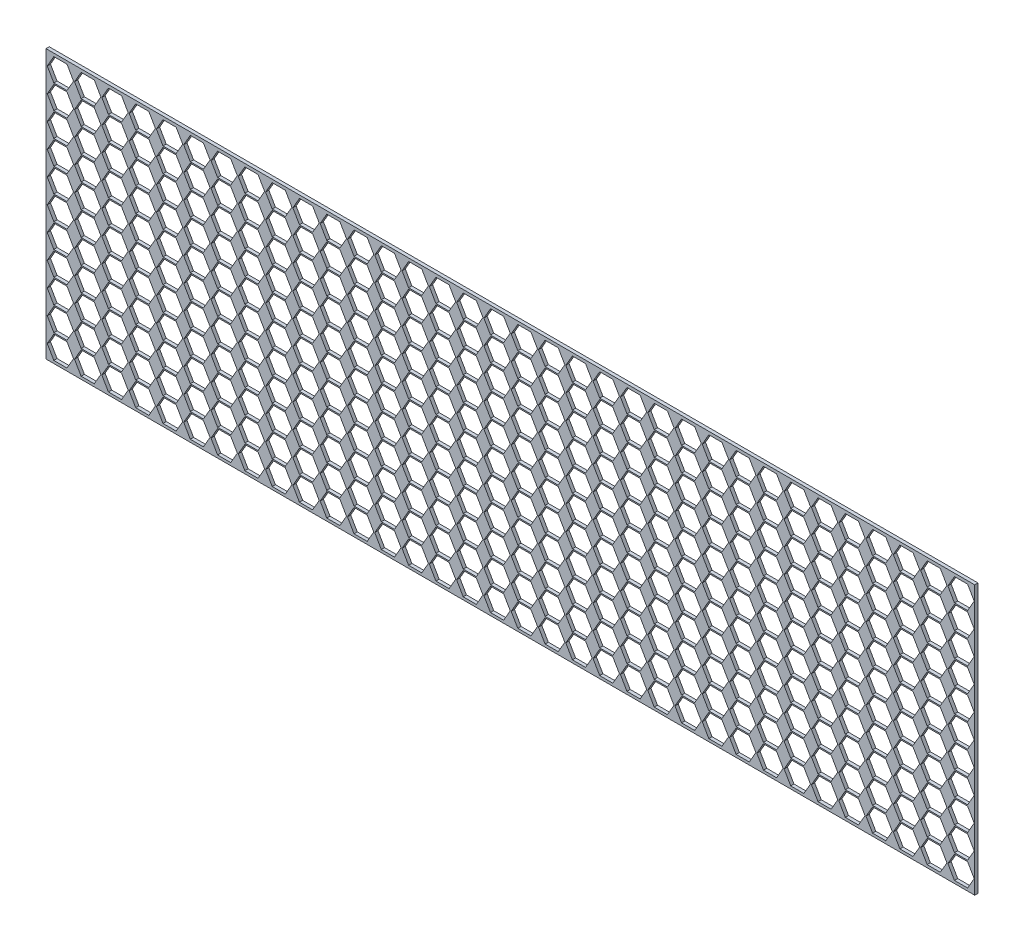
SolidWorks part; units mm, degrees
ref_plane "Alzado" through (0, 0, 0) normal (0, 0, 1) x (1, 0, 0)
ref_plane "Planta" through (0, 0, 0) normal (0, 1, 0) x (1, 0, 0)
ref_plane "Vista lateral" through (0, 0, 0) normal (1, 0, 0) x (0, 0, -1)
sketch "Croquis1" plane through (0, 0, 0) normal (0, 0, 1) x (1, 0, 0)
  line L1 (0, 0) -> (1140, 0)
  line L2 (0, 0) -> (0, 330)
  line L3 (0, 330) -> (1140, 330)
  line L4 (1140, 0) -> (1140, 330)
  dimension "D1" = 1140
  dimension "D2" = 330
extrude "Saliente-Extruir1" add sketch "Croquis1" along normal blind 4
sketch "Croquis2" plane through (0, 0, 4) normal (0, 0, 1) x (1, 0, 0)
  line L0 (43.0948, 298.3223) -> (59.2606, 298.3223)
  line L2 (33.8435, 312.3223) -> (25.7606, 326.3223)
  line L3 (25.7606, 326.3223) -> (9.5948, 326.3223)
  line L4 (9.5948, 326.3223) -> (1.5119, 312.3223)
  line L5 (1.5119, 312.3223) -> (9.5948, 298.3223)
  line L6 (9.5948, 298.3223) -> (25.7606, 298.3223)
  line L7 (25.7606, 298.3223) -> (33.8435, 312.3223)
  line L8 (59.2606, 298.3223) -> (67.3435, 312.3223)
  line L9 (67.3435, 312.3223) -> (59.2606, 326.3223)
  line L10 (59.2606, 326.3223) -> (43.0948, 326.3223)
  line L11 (43.0948, 326.3223) -> (35.0119, 312.3223)
  line L12 (35.0119, 312.3223) -> (43.0948, 298.3223)
  line L13 (76.5948, 298.3223) -> (92.7606, 298.3223)
  line L14 (92.7606, 298.3223) -> (100.8435, 312.3223)
  line L15 (100.8435, 312.3223) -> (92.7606, 326.3223)
  line L16 (92.7606, 326.3223) -> (76.5948, 326.3223)
  line L17 (76.5948, 326.3223) -> (68.5119, 312.3223)
  line L18 (68.5119, 312.3223) -> (76.5948, 298.3223)
  line L19 (110.0948, 298.3223) -> (126.2606, 298.3223)
  line L20 (126.2606, 298.3223) -> (134.3435, 312.3223)
  line L21 (134.3435, 312.3223) -> (126.2606, 326.3223)
  line L22 (126.2606, 326.3223) -> (110.0948, 326.3223)
  line L23 (110.0948, 326.3223) -> (102.0119, 312.3223)
  line L24 (102.0119, 312.3223) -> (110.0948, 298.3223)
  line L25 (143.5948, 298.3223) -> (159.7606, 298.3223)
  line L26 (159.7606, 298.3223) -> (167.8435, 312.3223)
  line L27 (167.8435, 312.3223) -> (159.7606, 326.3223)
  line L28 (159.7606, 326.3223) -> (143.5948, 326.3223)
  line L29 (143.5948, 326.3223) -> (135.5119, 312.3223)
  line L30 (135.5119, 312.3223) -> (143.5948, 298.3223)
  line L31 (177.0948, 298.3223) -> (193.2606, 298.3223)
  line L32 (193.2606, 298.3223) -> (201.3435, 312.3223)
  line L33 (201.3435, 312.3223) -> (193.2606, 326.3223)
  line L34 (193.2606, 326.3223) -> (177.0948, 326.3223)
  line L35 (177.0948, 326.3223) -> (169.0119, 312.3223)
  line L36 (169.0119, 312.3223) -> (177.0948, 298.3223)
  line L37 (210.5948, 298.3223) -> (226.7606, 298.3223)
  line L38 (226.7606, 298.3223) -> (234.8435, 312.3223)
  line L39 (234.8435, 312.3223) -> (226.7606, 326.3223)
  line L40 (226.7606, 326.3223) -> (210.5948, 326.3223)
  line L41 (210.5948, 326.3223) -> (202.5119, 312.3223)
  line L42 (202.5119, 312.3223) -> (210.5948, 298.3223)
  line L43 (244.0948, 298.3223) -> (260.2606, 298.3223)
  line L44 (260.2606, 298.3223) -> (268.3435, 312.3223)
  line L45 (268.3435, 312.3223) -> (260.2606, 326.3223)
  line L46 (260.2606, 326.3223) -> (244.0948, 326.3223)
  line L47 (244.0948, 326.3223) -> (236.0119, 312.3223)
  line L48 (236.0119, 312.3223) -> (244.0948, 298.3223)
  line L49 (277.5948, 298.3223) -> (293.7606, 298.3223)
  line L50 (293.7606, 298.3223) -> (301.8435, 312.3223)
  line L51 (301.8435, 312.3223) -> (293.7606, 326.3223)
  line L52 (293.7606, 326.3223) -> (277.5948, 326.3223)
  line L53 (277.5948, 326.3223) -> (269.5119, 312.3223)
  line L54 (269.5119, 312.3223) -> (277.5948, 298.3223)
  line L55 (311.0948, 298.3223) -> (327.2606, 298.3223)
  line L56 (327.2606, 298.3223) -> (335.3435, 312.3223)
  line L57 (335.3435, 312.3223) -> (327.2606, 326.3223)
  line L58 (327.2606, 326.3223) -> (311.0948, 326.3223)
  line L59 (311.0948, 326.3223) -> (303.0119, 312.3223)
  line L60 (303.0119, 312.3223) -> (311.0948, 298.3223)
  line L61 (344.5948, 298.3223) -> (360.7606, 298.3223)
  line L62 (360.7606, 298.3223) -> (368.8435, 312.3223)
  line L63 (368.8435, 312.3223) -> (360.7606, 326.3223)
  line L64 (360.7606, 326.3223) -> (344.5948, 326.3223)
  line L65 (344.5948, 326.3223) -> (336.5119, 312.3223)
  line L66 (336.5119, 312.3223) -> (344.5948, 298.3223)
  line L67 (378.0948, 298.3223) -> (394.2606, 298.3223)
  line L68 (394.2606, 298.3223) -> (402.3435, 312.3223)
  line L69 (402.3435, 312.3223) -> (394.2606, 326.3223)
  line L70 (394.2606, 326.3223) -> (378.0948, 326.3223)
  line L71 (378.0948, 326.3223) -> (370.0119, 312.3223)
  line L72 (370.0119, 312.3223) -> (378.0948, 298.3223)
  line L73 (411.5948, 298.3223) -> (427.7606, 298.3223)
  line L74 (427.7606, 298.3223) -> (435.8435, 312.3223)
  line L75 (435.8435, 312.3223) -> (427.7606, 326.3223)
  line L76 (427.7606, 326.3223) -> (411.5948, 326.3223)
  line L77 (411.5948, 326.3223) -> (403.5119, 312.3223)
  line L78 (403.5119, 312.3223) -> (411.5948, 298.3223)
  line L79 (445.0948, 298.3223) -> (461.2606, 298.3223)
  line L80 (461.2606, 298.3223) -> (469.3435, 312.3223)
  line L81 (469.3435, 312.3223) -> (461.2606, 326.3223)
  line L82 (461.2606, 326.3223) -> (445.0948, 326.3223)
  line L83 (445.0948, 326.3223) -> (437.0119, 312.3223)
  line L84 (437.0119, 312.3223) -> (445.0948, 298.3223)
  line L85 (478.5948, 298.3223) -> (494.7606, 298.3223)
  line L86 (494.7606, 298.3223) -> (502.8435, 312.3223)
  line L87 (502.8435, 312.3223) -> (494.7606, 326.3223)
  line L88 (494.7606, 326.3223) -> (478.5948, 326.3223)
  line L89 (478.5948, 326.3223) -> (470.5119, 312.3223)
  line L90 (470.5119, 312.3223) -> (478.5948, 298.3223)
  line L91 (512.0948, 298.3223) -> (528.2606, 298.3223)
  line L92 (528.2606, 298.3223) -> (536.3435, 312.3223)
  line L93 (536.3435, 312.3223) -> (528.2606, 326.3223)
  line L94 (528.2606, 326.3223) -> (512.0948, 326.3223)
  line L95 (512.0948, 326.3223) -> (504.0119, 312.3223)
  line L96 (504.0119, 312.3223) -> (512.0948, 298.3223)
  line L97 (545.5948, 298.3223) -> (561.7606, 298.3223)
  line L98 (561.7606, 298.3223) -> (569.8435, 312.3223)
  line L99 (569.8435, 312.3223) -> (561.7606, 326.3223)
  line L100 (561.7606, 326.3223) -> (545.5948, 326.3223)
  line L101 (545.5948, 326.3223) -> (537.5119, 312.3223)
  line L102 (537.5119, 312.3223) -> (545.5948, 298.3223)
  line L103 (579.0948, 298.3223) -> (595.2606, 298.3223)
  line L104 (595.2606, 298.3223) -> (603.3435, 312.3223)
  line L105 (603.3435, 312.3223) -> (595.2606, 326.3223)
  line L106 (595.2606, 326.3223) -> (579.0948, 326.3223)
  line L107 (579.0948, 326.3223) -> (571.0119, 312.3223)
  line L108 (571.0119, 312.3223) -> (579.0948, 298.3223)
  line L109 (612.5948, 298.3223) -> (628.7606, 298.3223)
  line L110 (628.7606, 298.3223) -> (636.8435, 312.3223)
  line L111 (636.8435, 312.3223) -> (628.7606, 326.3223)
  line L112 (628.7606, 326.3223) -> (612.5948, 326.3223)
  line L113 (612.5948, 326.3223) -> (604.5119, 312.3223)
  line L114 (604.5119, 312.3223) -> (612.5948, 298.3223)
  line L115 (646.0948, 298.3223) -> (662.2606, 298.3223)
  line L116 (662.2606, 298.3223) -> (670.3435, 312.3223)
  line L117 (670.3435, 312.3223) -> (662.2606, 326.3223)
  line L118 (662.2606, 326.3223) -> (646.0948, 326.3223)
  line L119 (646.0948, 326.3223) -> (638.0119, 312.3223)
  line L120 (638.0119, 312.3223) -> (646.0948, 298.3223)
  line L121 (679.5948, 298.3223) -> (695.7606, 298.3223)
  line L122 (695.7606, 298.3223) -> (703.8435, 312.3223)
  line L123 (703.8435, 312.3223) -> (695.7606, 326.3223)
  line L124 (695.7606, 326.3223) -> (679.5948, 326.3223)
  line L125 (679.5948, 326.3223) -> (671.5119, 312.3223)
  line L126 (671.5119, 312.3223) -> (679.5948, 298.3223)
  line L127 (713.0948, 298.3223) -> (729.2606, 298.3223)
  line L128 (729.2606, 298.3223) -> (737.3435, 312.3223)
  line L129 (737.3435, 312.3223) -> (729.2606, 326.3223)
  line L130 (729.2606, 326.3223) -> (713.0948, 326.3223)
  line L131 (713.0948, 326.3223) -> (705.0119, 312.3223)
  line L132 (705.0119, 312.3223) -> (713.0948, 298.3223)
  line L133 (746.5948, 298.3223) -> (762.7606, 298.3223)
  line L134 (762.7606, 298.3223) -> (770.8435, 312.3223)
  line L135 (770.8435, 312.3223) -> (762.7606, 326.3223)
  line L136 (762.7606, 326.3223) -> (746.5948, 326.3223)
  line L137 (746.5948, 326.3223) -> (738.5119, 312.3223)
  line L138 (738.5119, 312.3223) -> (746.5948, 298.3223)
  line L139 (780.0948, 298.3223) -> (796.2606, 298.3223)
  line L140 (796.2606, 298.3223) -> (804.3435, 312.3223)
  line L141 (804.3435, 312.3223) -> (796.2606, 326.3223)
  line L142 (796.2606, 326.3223) -> (780.0948, 326.3223)
  line L143 (780.0948, 326.3223) -> (772.0119, 312.3223)
  line L144 (772.0119, 312.3223) -> (780.0948, 298.3223)
  line L145 (813.5948, 298.3223) -> (829.7606, 298.3223)
  line L146 (829.7606, 298.3223) -> (837.8435, 312.3223)
  line L147 (837.8435, 312.3223) -> (829.7606, 326.3223)
  line L148 (829.7606, 326.3223) -> (813.5948, 326.3223)
  line L149 (813.5948, 326.3223) -> (805.5119, 312.3223)
  line L150 (805.5119, 312.3223) -> (813.5948, 298.3223)
  line L151 (847.0948, 298.3223) -> (863.2606, 298.3223)
  line L152 (863.2606, 298.3223) -> (871.3435, 312.3223)
  line L153 (871.3435, 312.3223) -> (863.2606, 326.3223)
  line L154 (863.2606, 326.3223) -> (847.0948, 326.3223)
  line L155 (847.0948, 326.3223) -> (839.0119, 312.3223)
  line L156 (839.0119, 312.3223) -> (847.0948, 298.3223)
  line L157 (880.5948, 298.3223) -> (896.7606, 298.3223)
  line L158 (896.7606, 298.3223) -> (904.8435, 312.3223)
  line L159 (904.8435, 312.3223) -> (896.7606, 326.3223)
  line L160 (896.7606, 326.3223) -> (880.5948, 326.3223)
  line L161 (880.5948, 326.3223) -> (872.5119, 312.3223)
  line L162 (872.5119, 312.3223) -> (880.5948, 298.3223)
  line L163 (914.0948, 298.3223) -> (930.2606, 298.3223)
  line L164 (930.2606, 298.3223) -> (938.3435, 312.3223)
  line L165 (938.3435, 312.3223) -> (930.2606, 326.3223)
  line L166 (930.2606, 326.3223) -> (914.0948, 326.3223)
  line L167 (914.0948, 326.3223) -> (906.0119, 312.3223)
  line L168 (906.0119, 312.3223) -> (914.0948, 298.3223)
  line L169 (947.5948, 298.3223) -> (963.7606, 298.3223)
  line L170 (963.7606, 298.3223) -> (971.8435, 312.3223)
  line L171 (971.8435, 312.3223) -> (963.7606, 326.3223)
  line L172 (963.7606, 326.3223) -> (947.5948, 326.3223)
  line L173 (947.5948, 326.3223) -> (939.5119, 312.3223)
  line L174 (939.5119, 312.3223) -> (947.5948, 298.3223)
  line L175 (981.0948, 298.3223) -> (997.2606, 298.3223)
  line L176 (997.2606, 298.3223) -> (1005.3435, 312.3223)
  line L177 (1005.3435, 312.3223) -> (997.2606, 326.3223)
  line L178 (997.2606, 326.3223) -> (981.0948, 326.3223)
  line L179 (981.0948, 326.3223) -> (973.0119, 312.3223)
  line L180 (973.0119, 312.3223) -> (981.0948, 298.3223)
  line L181 (1014.5948, 298.3223) -> (1030.7606, 298.3223)
  line L182 (1030.7606, 298.3223) -> (1038.8435, 312.3223)
  line L183 (1038.8435, 312.3223) -> (1030.7606, 326.3223)
  line L184 (1030.7606, 326.3223) -> (1014.5948, 326.3223)
  line L185 (1014.5948, 326.3223) -> (1006.5119, 312.3223)
  line L186 (1006.5119, 312.3223) -> (1014.5948, 298.3223)
  line L187 (1048.0948, 298.3223) -> (1064.2606, 298.3223)
  line L188 (1064.2606, 298.3223) -> (1072.3435, 312.3223)
  line L189 (1072.3435, 312.3223) -> (1064.2606, 326.3223)
  line L190 (1064.2606, 326.3223) -> (1048.0948, 326.3223)
  line L191 (1048.0948, 326.3223) -> (1040.0119, 312.3223)
  line L192 (1040.0119, 312.3223) -> (1048.0948, 298.3223)
  line L193 (1081.5948, 298.3223) -> (1097.7606, 298.3223)
  line L194 (1097.7606, 298.3223) -> (1105.8435, 312.3223)
  line L195 (1105.8435, 312.3223) -> (1097.7606, 326.3223)
  line L196 (1097.7606, 326.3223) -> (1081.5948, 326.3223)
  line L197 (1081.5948, 326.3223) -> (1073.5119, 312.3223)
  line L198 (1073.5119, 312.3223) -> (1081.5948, 298.3223)
  line L199 (1115.0948, 298.3223) -> (1131.2606, 298.3223)
  line L200 (1131.2606, 298.3223) -> (1139.3435, 312.3223)
  line L201 (1139.3435, 312.3223) -> (1131.2606, 326.3223)
  line L202 (1131.2606, 326.3223) -> (1115.0948, 326.3223)
  line L203 (1115.0948, 326.3223) -> (1107.0119, 312.3223)
  line L204 (1107.0119, 312.3223) -> (1115.0948, 298.3223)
  line L205 (9.5948, 268.8223) -> (25.7606, 268.8223)
  line L206 (25.7606, 268.8223) -> (33.8435, 282.8223)
  line L207 (33.8435, 282.8223) -> (25.7606, 296.8223)
  line L208 (25.7606, 296.8223) -> (9.5948, 296.8223)
  line L209 (9.5948, 296.8223) -> (1.5119, 282.8223)
  line L210 (1.5119, 282.8223) -> (9.5948, 268.8223)
  line L211 (43.0948, 268.8223) -> (59.2606, 268.8223)
  line L212 (59.2606, 268.8223) -> (67.3435, 282.8223)
  line L213 (67.3435, 282.8223) -> (59.2606, 296.8223)
  line L214 (59.2606, 296.8223) -> (43.0948, 296.8223)
  line L215 (43.0948, 296.8223) -> (35.0119, 282.8223)
  line L216 (35.0119, 282.8223) -> (43.0948, 268.8223)
  line L217 (76.5948, 268.8223) -> (92.7606, 268.8223)
  line L218 (92.7606, 268.8223) -> (100.8435, 282.8223)
  line L219 (100.8435, 282.8223) -> (92.7606, 296.8223)
  line L220 (92.7606, 296.8223) -> (76.5948, 296.8223)
  line L221 (76.5948, 296.8223) -> (68.5119, 282.8223)
  line L222 (68.5119, 282.8223) -> (76.5948, 268.8223)
  line L223 (110.0948, 268.8223) -> (126.2606, 268.8223)
  line L224 (126.2606, 268.8223) -> (134.3435, 282.8223)
  line L225 (134.3435, 282.8223) -> (126.2606, 296.8223)
  line L226 (126.2606, 296.8223) -> (110.0948, 296.8223)
  line L227 (110.0948, 296.8223) -> (102.0119, 282.8223)
  line L228 (102.0119, 282.8223) -> (110.0948, 268.8223)
  line L229 (143.5948, 268.8223) -> (159.7606, 268.8223)
  line L230 (159.7606, 268.8223) -> (167.8435, 282.8223)
  line L231 (167.8435, 282.8223) -> (159.7606, 296.8223)
  line L232 (159.7606, 296.8223) -> (143.5948, 296.8223)
  line L233 (143.5948, 296.8223) -> (135.5119, 282.8223)
  line L234 (135.5119, 282.8223) -> (143.5948, 268.8223)
  line L235 (177.0948, 268.8223) -> (193.2606, 268.8223)
  line L236 (193.2606, 268.8223) -> (201.3435, 282.8223)
  line L237 (201.3435, 282.8223) -> (193.2606, 296.8223)
  line L238 (193.2606, 296.8223) -> (177.0948, 296.8223)
  line L239 (177.0948, 296.8223) -> (169.0119, 282.8223)
  line L240 (169.0119, 282.8223) -> (177.0948, 268.8223)
  line L241 (210.5948, 268.8223) -> (226.7606, 268.8223)
  line L242 (226.7606, 268.8223) -> (234.8435, 282.8223)
  line L243 (234.8435, 282.8223) -> (226.7606, 296.8223)
  line L244 (226.7606, 296.8223) -> (210.5948, 296.8223)
  line L245 (210.5948, 296.8223) -> (202.5119, 282.8223)
  line L246 (202.5119, 282.8223) -> (210.5948, 268.8223)
  line L247 (244.0948, 268.8223) -> (260.2606, 268.8223)
  line L248 (260.2606, 268.8223) -> (268.3435, 282.8223)
  line L249 (268.3435, 282.8223) -> (260.2606, 296.8223)
  line L250 (260.2606, 296.8223) -> (244.0948, 296.8223)
  line L251 (244.0948, 296.8223) -> (236.0119, 282.8223)
  line L252 (236.0119, 282.8223) -> (244.0948, 268.8223)
  line L253 (277.5948, 268.8223) -> (293.7606, 268.8223)
  line L254 (293.7606, 268.8223) -> (301.8435, 282.8223)
  line L255 (301.8435, 282.8223) -> (293.7606, 296.8223)
  line L256 (293.7606, 296.8223) -> (277.5948, 296.8223)
  line L257 (277.5948, 296.8223) -> (269.5119, 282.8223)
  line L258 (269.5119, 282.8223) -> (277.5948, 268.8223)
  line L259 (311.0948, 268.8223) -> (327.2606, 268.8223)
  line L260 (327.2606, 268.8223) -> (335.3435, 282.8223)
  line L261 (335.3435, 282.8223) -> (327.2606, 296.8223)
  line L262 (327.2606, 296.8223) -> (311.0948, 296.8223)
  line L263 (311.0948, 296.8223) -> (303.0119, 282.8223)
  line L264 (303.0119, 282.8223) -> (311.0948, 268.8223)
  line L265 (344.5948, 268.8223) -> (360.7606, 268.8223)
  line L266 (360.7606, 268.8223) -> (368.8435, 282.8223)
  line L267 (368.8435, 282.8223) -> (360.7606, 296.8223)
  line L268 (360.7606, 296.8223) -> (344.5948, 296.8223)
  line L269 (344.5948, 296.8223) -> (336.5119, 282.8223)
  line L270 (336.5119, 282.8223) -> (344.5948, 268.8223)
  line L271 (378.0948, 268.8223) -> (394.2606, 268.8223)
  line L272 (394.2606, 268.8223) -> (402.3435, 282.8223)
  line L273 (402.3435, 282.8223) -> (394.2606, 296.8223)
  line L274 (394.2606, 296.8223) -> (378.0948, 296.8223)
  line L275 (378.0948, 296.8223) -> (370.0119, 282.8223)
  line L276 (370.0119, 282.8223) -> (378.0948, 268.8223)
  line L277 (411.5948, 268.8223) -> (427.7606, 268.8223)
  line L278 (427.7606, 268.8223) -> (435.8435, 282.8223)
  line L279 (435.8435, 282.8223) -> (427.7606, 296.8223)
  line L280 (427.7606, 296.8223) -> (411.5948, 296.8223)
  line L281 (411.5948, 296.8223) -> (403.5119, 282.8223)
  line L282 (403.5119, 282.8223) -> (411.5948, 268.8223)
  line L283 (445.0948, 268.8223) -> (461.2606, 268.8223)
  line L284 (461.2606, 268.8223) -> (469.3435, 282.8223)
  line L285 (469.3435, 282.8223) -> (461.2606, 296.8223)
  line L286 (461.2606, 296.8223) -> (445.0948, 296.8223)
  line L287 (445.0948, 296.8223) -> (437.0119, 282.8223)
  line L288 (437.0119, 282.8223) -> (445.0948, 268.8223)
  line L289 (478.5948, 268.8223) -> (494.7606, 268.8223)
  line L290 (494.7606, 268.8223) -> (502.8435, 282.8223)
  line L291 (502.8435, 282.8223) -> (494.7606, 296.8223)
  line L292 (494.7606, 296.8223) -> (478.5948, 296.8223)
  line L293 (478.5948, 296.8223) -> (470.5119, 282.8223)
  line L294 (470.5119, 282.8223) -> (478.5948, 268.8223)
  line L295 (512.0948, 268.8223) -> (528.2606, 268.8223)
  line L296 (528.2606, 268.8223) -> (536.3435, 282.8223)
  line L297 (536.3435, 282.8223) -> (528.2606, 296.8223)
  line L298 (528.2606, 296.8223) -> (512.0948, 296.8223)
  line L299 (512.0948, 296.8223) -> (504.0119, 282.8223)
  line L300 (504.0119, 282.8223) -> (512.0948, 268.8223)
  line L301 (545.5948, 268.8223) -> (561.7606, 268.8223)
  line L302 (561.7606, 268.8223) -> (569.8435, 282.8223)
  line L303 (569.8435, 282.8223) -> (561.7606, 296.8223)
  line L304 (561.7606, 296.8223) -> (545.5948, 296.8223)
  line L305 (545.5948, 296.8223) -> (537.5119, 282.8223)
  line L306 (537.5119, 282.8223) -> (545.5948, 268.8223)
  line L307 (579.0948, 268.8223) -> (595.2606, 268.8223)
  line L308 (595.2606, 268.8223) -> (603.3435, 282.8223)
  line L309 (603.3435, 282.8223) -> (595.2606, 296.8223)
  line L310 (595.2606, 296.8223) -> (579.0948, 296.8223)
  line L311 (579.0948, 296.8223) -> (571.0119, 282.8223)
  line L312 (571.0119, 282.8223) -> (579.0948, 268.8223)
  line L313 (612.5948, 268.8223) -> (628.7606, 268.8223)
  line L314 (628.7606, 268.8223) -> (636.8435, 282.8223)
  line L315 (636.8435, 282.8223) -> (628.7606, 296.8223)
  line L316 (628.7606, 296.8223) -> (612.5948, 296.8223)
  line L317 (612.5948, 296.8223) -> (604.5119, 282.8223)
  line L318 (604.5119, 282.8223) -> (612.5948, 268.8223)
  line L319 (646.0948, 268.8223) -> (662.2606, 268.8223)
  line L320 (662.2606, 268.8223) -> (670.3435, 282.8223)
  line L321 (670.3435, 282.8223) -> (662.2606, 296.8223)
  line L322 (662.2606, 296.8223) -> (646.0948, 296.8223)
  line L323 (646.0948, 296.8223) -> (638.0119, 282.8223)
  line L324 (638.0119, 282.8223) -> (646.0948, 268.8223)
  line L325 (679.5948, 268.8223) -> (695.7606, 268.8223)
  line L326 (695.7606, 268.8223) -> (703.8435, 282.8223)
  line L327 (703.8435, 282.8223) -> (695.7606, 296.8223)
  line L328 (695.7606, 296.8223) -> (679.5948, 296.8223)
  line L329 (679.5948, 296.8223) -> (671.5119, 282.8223)
  line L330 (671.5119, 282.8223) -> (679.5948, 268.8223)
  line L331 (713.0948, 268.8223) -> (729.2606, 268.8223)
  line L332 (729.2606, 268.8223) -> (737.3435, 282.8223)
  line L333 (737.3435, 282.8223) -> (729.2606, 296.8223)
  line L334 (729.2606, 296.8223) -> (713.0948, 296.8223)
  line L335 (713.0948, 296.8223) -> (705.0119, 282.8223)
  line L336 (705.0119, 282.8223) -> (713.0948, 268.8223)
  line L337 (746.5948, 268.8223) -> (762.7606, 268.8223)
  line L338 (762.7606, 268.8223) -> (770.8435, 282.8223)
  line L339 (770.8435, 282.8223) -> (762.7606, 296.8223)
  line L340 (762.7606, 296.8223) -> (746.5948, 296.8223)
  line L341 (746.5948, 296.8223) -> (738.5119, 282.8223)
  line L342 (738.5119, 282.8223) -> (746.5948, 268.8223)
  line L343 (780.0948, 268.8223) -> (796.2606, 268.8223)
  line L344 (796.2606, 268.8223) -> (804.3435, 282.8223)
  line L345 (804.3435, 282.8223) -> (796.2606, 296.8223)
  line L346 (796.2606, 296.8223) -> (780.0948, 296.8223)
  line L347 (780.0948, 296.8223) -> (772.0119, 282.8223)
  line L348 (772.0119, 282.8223) -> (780.0948, 268.8223)
  line L349 (813.5948, 268.8223) -> (829.7606, 268.8223)
  line L350 (829.7606, 268.8223) -> (837.8435, 282.8223)
  line L351 (837.8435, 282.8223) -> (829.7606, 296.8223)
  line L352 (829.7606, 296.8223) -> (813.5948, 296.8223)
  line L353 (813.5948, 296.8223) -> (805.5119, 282.8223)
  line L354 (805.5119, 282.8223) -> (813.5948, 268.8223)
  line L355 (847.0948, 268.8223) -> (863.2606, 268.8223)
  line L356 (863.2606, 268.8223) -> (871.3435, 282.8223)
  line L357 (871.3435, 282.8223) -> (863.2606, 296.8223)
  line L358 (863.2606, 296.8223) -> (847.0948, 296.8223)
  line L359 (847.0948, 296.8223) -> (839.0119, 282.8223)
  line L360 (839.0119, 282.8223) -> (847.0948, 268.8223)
  line L361 (880.5948, 268.8223) -> (896.7606, 268.8223)
  line L362 (896.7606, 268.8223) -> (904.8435, 282.8223)
  line L363 (904.8435, 282.8223) -> (896.7606, 296.8223)
  line L364 (896.7606, 296.8223) -> (880.5948, 296.8223)
  line L365 (880.5948, 296.8223) -> (872.5119, 282.8223)
  line L366 (872.5119, 282.8223) -> (880.5948, 268.8223)
  line L367 (914.0948, 268.8223) -> (930.2606, 268.8223)
  line L368 (930.2606, 268.8223) -> (938.3435, 282.8223)
  line L369 (938.3435, 282.8223) -> (930.2606, 296.8223)
  line L370 (930.2606, 296.8223) -> (914.0948, 296.8223)
  line L371 (914.0948, 296.8223) -> (906.0119, 282.8223)
  line L372 (906.0119, 282.8223) -> (914.0948, 268.8223)
  line L373 (947.5948, 268.8223) -> (963.7606, 268.8223)
  line L374 (963.7606, 268.8223) -> (971.8435, 282.8223)
  line L375 (971.8435, 282.8223) -> (963.7606, 296.8223)
  line L376 (963.7606, 296.8223) -> (947.5948, 296.8223)
  line L377 (947.5948, 296.8223) -> (939.5119, 282.8223)
  line L378 (939.5119, 282.8223) -> (947.5948, 268.8223)
  line L379 (981.0948, 268.8223) -> (997.2606, 268.8223)
  line L380 (997.2606, 268.8223) -> (1005.3435, 282.8223)
  line L381 (1005.3435, 282.8223) -> (997.2606, 296.8223)
  line L382 (997.2606, 296.8223) -> (981.0948, 296.8223)
  line L383 (981.0948, 296.8223) -> (973.0119, 282.8223)
  line L384 (973.0119, 282.8223) -> (981.0948, 268.8223)
  line L385 (1014.5948, 268.8223) -> (1030.7606, 268.8223)
  line L386 (1030.7606, 268.8223) -> (1038.8435, 282.8223)
  line L387 (1038.8435, 282.8223) -> (1030.7606, 296.8223)
  line L388 (1030.7606, 296.8223) -> (1014.5948, 296.8223)
  line L389 (1014.5948, 296.8223) -> (1006.5119, 282.8223)
  line L390 (1006.5119, 282.8223) -> (1014.5948, 268.8223)
  line L391 (1048.0948, 268.8223) -> (1064.2606, 268.8223)
  line L392 (1064.2606, 268.8223) -> (1072.3435, 282.8223)
  line L393 (1072.3435, 282.8223) -> (1064.2606, 296.8223)
  line L394 (1064.2606, 296.8223) -> (1048.0948, 296.8223)
  line L395 (1048.0948, 296.8223) -> (1040.0119, 282.8223)
  line L396 (1040.0119, 282.8223) -> (1048.0948, 268.8223)
  line L397 (1081.5948, 268.8223) -> (1097.7606, 268.8223)
  line L398 (1097.7606, 268.8223) -> (1105.8435, 282.8223)
  line L399 (1105.8435, 282.8223) -> (1097.7606, 296.8223)
  line L400 (1097.7606, 296.8223) -> (1081.5948, 296.8223)
  line L401 (1081.5948, 296.8223) -> (1073.5119, 282.8223)
  line L402 (1073.5119, 282.8223) -> (1081.5948, 268.8223)
  line L403 (1115.0948, 268.8223) -> (1131.2606, 268.8223)
  line L404 (1131.2606, 268.8223) -> (1139.3435, 282.8223)
  line L405 (1139.3435, 282.8223) -> (1131.2606, 296.8223)
  line L406 (1131.2606, 296.8223) -> (1115.0948, 296.8223)
  line L407 (1115.0948, 296.8223) -> (1107.0119, 282.8223)
  line L408 (1107.0119, 282.8223) -> (1115.0948, 268.8223)
  line L409 (9.5948, 239.3223) -> (25.7606, 239.3223)
  line L410 (25.7606, 239.3223) -> (33.8435, 253.3223)
  line L411 (33.8435, 253.3223) -> (25.7606, 267.3223)
  line L412 (25.7606, 267.3223) -> (9.5948, 267.3223)
  line L413 (9.5948, 267.3223) -> (1.5119, 253.3223)
  line L414 (1.5119, 253.3223) -> (9.5948, 239.3223)
  line L415 (43.0948, 239.3223) -> (59.2606, 239.3223)
  line L416 (59.2606, 239.3223) -> (67.3435, 253.3223)
  line L417 (67.3435, 253.3223) -> (59.2606, 267.3223)
  line L418 (59.2606, 267.3223) -> (43.0948, 267.3223)
  line L419 (43.0948, 267.3223) -> (35.0119, 253.3223)
  line L420 (35.0119, 253.3223) -> (43.0948, 239.3223)
  line L421 (76.5948, 239.3223) -> (92.7606, 239.3223)
  line L422 (92.7606, 239.3223) -> (100.8435, 253.3223)
  line L423 (100.8435, 253.3223) -> (92.7606, 267.3223)
  line L424 (92.7606, 267.3223) -> (76.5948, 267.3223)
  line L425 (76.5948, 267.3223) -> (68.5119, 253.3223)
  line L426 (68.5119, 253.3223) -> (76.5948, 239.3223)
  line L427 (110.0948, 239.3223) -> (126.2606, 239.3223)
  line L428 (126.2606, 239.3223) -> (134.3435, 253.3223)
  line L429 (134.3435, 253.3223) -> (126.2606, 267.3223)
  line L430 (126.2606, 267.3223) -> (110.0948, 267.3223)
  line L431 (110.0948, 267.3223) -> (102.0119, 253.3223)
  line L432 (102.0119, 253.3223) -> (110.0948, 239.3223)
  line L433 (143.5948, 239.3223) -> (159.7606, 239.3223)
  line L434 (159.7606, 239.3223) -> (167.8435, 253.3223)
  line L435 (167.8435, 253.3223) -> (159.7606, 267.3223)
  line L436 (159.7606, 267.3223) -> (143.5948, 267.3223)
  line L437 (143.5948, 267.3223) -> (135.5119, 253.3223)
  line L438 (135.5119, 253.3223) -> (143.5948, 239.3223)
  line L439 (177.0948, 239.3223) -> (193.2606, 239.3223)
  line L440 (193.2606, 239.3223) -> (201.3435, 253.3223)
  line L441 (201.3435, 253.3223) -> (193.2606, 267.3223)
  line L442 (193.2606, 267.3223) -> (177.0948, 267.3223)
  line L443 (177.0948, 267.3223) -> (169.0119, 253.3223)
  line L444 (169.0119, 253.3223) -> (177.0948, 239.3223)
  line L445 (210.5948, 239.3223) -> (226.7606, 239.3223)
  line L446 (226.7606, 239.3223) -> (234.8435, 253.3223)
  line L447 (234.8435, 253.3223) -> (226.7606, 267.3223)
  line L448 (226.7606, 267.3223) -> (210.5948, 267.3223)
  line L449 (210.5948, 267.3223) -> (202.5119, 253.3223)
  line L450 (202.5119, 253.3223) -> (210.5948, 239.3223)
  line L451 (244.0948, 239.3223) -> (260.2606, 239.3223)
  line L452 (260.2606, 239.3223) -> (268.3435, 253.3223)
  line L453 (268.3435, 253.3223) -> (260.2606, 267.3223)
  line L454 (260.2606, 267.3223) -> (244.0948, 267.3223)
  line L455 (244.0948, 267.3223) -> (236.0119, 253.3223)
  line L456 (236.0119, 253.3223) -> (244.0948, 239.3223)
  line L457 (277.5948, 239.3223) -> (293.7606, 239.3223)
  line L458 (293.7606, 239.3223) -> (301.8435, 253.3223)
  line L459 (301.8435, 253.3223) -> (293.7606, 267.3223)
  line L460 (293.7606, 267.3223) -> (277.5948, 267.3223)
  line L461 (277.5948, 267.3223) -> (269.5119, 253.3223)
  line L462 (269.5119, 253.3223) -> (277.5948, 239.3223)
  line L463 (311.0948, 239.3223) -> (327.2606, 239.3223)
  line L464 (327.2606, 239.3223) -> (335.3435, 253.3223)
  line L465 (335.3435, 253.3223) -> (327.2606, 267.3223)
  line L466 (327.2606, 267.3223) -> (311.0948, 267.3223)
  line L467 (311.0948, 267.3223) -> (303.0119, 253.3223)
  line L468 (303.0119, 253.3223) -> (311.0948, 239.3223)
  line L469 (344.5948, 239.3223) -> (360.7606, 239.3223)
  line L470 (360.7606, 239.3223) -> (368.8435, 253.3223)
  line L471 (368.8435, 253.3223) -> (360.7606, 267.3223)
  line L472 (360.7606, 267.3223) -> (344.5948, 267.3223)
  line L473 (344.5948, 267.3223) -> (336.5119, 253.3223)
  line L474 (336.5119, 253.3223) -> (344.5948, 239.3223)
  line L475 (378.0948, 239.3223) -> (394.2606, 239.3223)
  line L476 (394.2606, 239.3223) -> (402.3435, 253.3223)
  line L477 (402.3435, 253.3223) -> (394.2606, 267.3223)
  line L478 (394.2606, 267.3223) -> (378.0948, 267.3223)
  line L479 (378.0948, 267.3223) -> (370.0119, 253.3223)
  line L480 (370.0119, 253.3223) -> (378.0948, 239.3223)
  line L481 (411.5948, 239.3223) -> (427.7606, 239.3223)
  line L482 (427.7606, 239.3223) -> (435.8435, 253.3223)
  line L483 (435.8435, 253.3223) -> (427.7606, 267.3223)
  line L484 (427.7606, 267.3223) -> (411.5948, 267.3223)
  line L485 (411.5948, 267.3223) -> (403.5119, 253.3223)
  line L486 (403.5119, 253.3223) -> (411.5948, 239.3223)
  line L487 (445.0948, 239.3223) -> (461.2606, 239.3223)
  line L488 (461.2606, 239.3223) -> (469.3435, 253.3223)
  line L489 (469.3435, 253.3223) -> (461.2606, 267.3223)
  line L490 (461.2606, 267.3223) -> (445.0948, 267.3223)
  line L491 (445.0948, 267.3223) -> (437.0119, 253.3223)
  line L492 (437.0119, 253.3223) -> (445.0948, 239.3223)
  line L493 (478.5948, 239.3223) -> (494.7606, 239.3223)
  line L494 (494.7606, 239.3223) -> (502.8435, 253.3223)
  line L495 (502.8435, 253.3223) -> (494.7606, 267.3223)
  line L496 (494.7606, 267.3223) -> (478.5948, 267.3223)
  line L497 (478.5948, 267.3223) -> (470.5119, 253.3223)
  line L498 (470.5119, 253.3223) -> (478.5948, 239.3223)
  line L499 (512.0948, 239.3223) -> (528.2606, 239.3223)
  line L500 (528.2606, 239.3223) -> (536.3435, 253.3223)
  line L501 (536.3435, 253.3223) -> (528.2606, 267.3223)
  line L502 (528.2606, 267.3223) -> (512.0948, 267.3223)
  line L503 (512.0948, 267.3223) -> (504.0119, 253.3223)
  line L504 (504.0119, 253.3223) -> (512.0948, 239.3223)
  line L505 (545.5948, 239.3223) -> (561.7606, 239.3223)
  line L506 (561.7606, 239.3223) -> (569.8435, 253.3223)
  line L507 (569.8435, 253.3223) -> (561.7606, 267.3223)
  line L508 (561.7606, 267.3223) -> (545.5948, 267.3223)
  line L509 (545.5948, 267.3223) -> (537.5119, 253.3223)
  line L510 (537.5119, 253.3223) -> (545.5948, 239.3223)
  line L511 (579.0948, 239.3223) -> (595.2606, 239.3223)
  line L512 (595.2606, 239.3223) -> (603.3435, 253.3223)
  line L513 (603.3435, 253.3223) -> (595.2606, 267.3223)
  line L514 (595.2606, 267.3223) -> (579.0948, 267.3223)
  line L515 (579.0948, 267.3223) -> (571.0119, 253.3223)
  line L516 (571.0119, 253.3223) -> (579.0948, 239.3223)
  line L517 (612.5948, 239.3223) -> (628.7606, 239.3223)
  line L518 (628.7606, 239.3223) -> (636.8435, 253.3223)
  line L519 (636.8435, 253.3223) -> (628.7606, 267.3223)
  line L520 (628.7606, 267.3223) -> (612.5948, 267.3223)
  line L521 (612.5948, 267.3223) -> (604.5119, 253.3223)
  line L522 (604.5119, 253.3223) -> (612.5948, 239.3223)
  line L523 (646.0948, 239.3223) -> (662.2606, 239.3223)
  line L524 (662.2606, 239.3223) -> (670.3435, 253.3223)
  line L525 (670.3435, 253.3223) -> (662.2606, 267.3223)
  line L526 (662.2606, 267.3223) -> (646.0948, 267.3223)
  line L527 (646.0948, 267.3223) -> (638.0119, 253.3223)
  line L528 (638.0119, 253.3223) -> (646.0948, 239.3223)
  line L529 (679.5948, 239.3223) -> (695.7606, 239.3223)
  line L530 (695.7606, 239.3223) -> (703.8435, 253.3223)
  line L531 (703.8435, 253.3223) -> (695.7606, 267.3223)
  line L532 (695.7606, 267.3223) -> (679.5948, 267.3223)
  line L533 (679.5948, 267.3223) -> (671.5119, 253.3223)
  line L534 (671.5119, 253.3223) -> (679.5948, 239.3223)
  line L535 (713.0948, 239.3223) -> (729.2606, 239.3223)
  line L536 (729.2606, 239.3223) -> (737.3435, 253.3223)
  line L537 (737.3435, 253.3223) -> (729.2606, 267.3223)
  line L538 (729.2606, 267.3223) -> (713.0948, 267.3223)
  line L539 (713.0948, 267.3223) -> (705.0119, 253.3223)
  line L540 (705.0119, 253.3223) -> (713.0948, 239.3223)
  line L541 (746.5948, 239.3223) -> (762.7606, 239.3223)
  line L542 (762.7606, 239.3223) -> (770.8435, 253.3223)
  line L543 (770.8435, 253.3223) -> (762.7606, 267.3223)
  line L544 (762.7606, 267.3223) -> (746.5948, 267.3223)
  line L545 (746.5948, 267.3223) -> (738.5119, 253.3223)
  line L546 (738.5119, 253.3223) -> (746.5948, 239.3223)
  line L547 (780.0948, 239.3223) -> (796.2606, 239.3223)
  line L548 (796.2606, 239.3223) -> (804.3435, 253.3223)
  line L549 (804.3435, 253.3223) -> (796.2606, 267.3223)
  line L550 (796.2606, 267.3223) -> (780.0948, 267.3223)
  line L551 (780.0948, 267.3223) -> (772.0119, 253.3223)
  line L552 (772.0119, 253.3223) -> (780.0948, 239.3223)
  line L553 (813.5948, 239.3223) -> (829.7606, 239.3223)
  line L554 (829.7606, 239.3223) -> (837.8435, 253.3223)
  line L555 (837.8435, 253.3223) -> (829.7606, 267.3223)
  line L556 (829.7606, 267.3223) -> (813.5948, 267.3223)
  line L557 (813.5948, 267.3223) -> (805.5119, 253.3223)
  line L558 (805.5119, 253.3223) -> (813.5948, 239.3223)
  line L559 (847.0948, 239.3223) -> (863.2606, 239.3223)
  line L560 (863.2606, 239.3223) -> (871.3435, 253.3223)
  line L561 (871.3435, 253.3223) -> (863.2606, 267.3223)
  line L562 (863.2606, 267.3223) -> (847.0948, 267.3223)
  line L563 (847.0948, 267.3223) -> (839.0119, 253.3223)
  line L564 (839.0119, 253.3223) -> (847.0948, 239.3223)
  line L565 (880.5948, 239.3223) -> (896.7606, 239.3223)
  line L566 (896.7606, 239.3223) -> (904.8435, 253.3223)
  line L567 (904.8435, 253.3223) -> (896.7606, 267.3223)
  line L568 (896.7606, 267.3223) -> (880.5948, 267.3223)
  line L569 (880.5948, 267.3223) -> (872.5119, 253.3223)
  line L570 (872.5119, 253.3223) -> (880.5948, 239.3223)
  line L571 (914.0948, 239.3223) -> (930.2606, 239.3223)
  line L572 (930.2606, 239.3223) -> (938.3435, 253.3223)
  line L573 (938.3435, 253.3223) -> (930.2606, 267.3223)
  line L574 (930.2606, 267.3223) -> (914.0948, 267.3223)
  line L575 (914.0948, 267.3223) -> (906.0119, 253.3223)
  line L576 (906.0119, 253.3223) -> (914.0948, 239.3223)
  line L577 (947.5948, 239.3223) -> (963.7606, 239.3223)
  line L578 (963.7606, 239.3223) -> (971.8435, 253.3223)
  line L579 (971.8435, 253.3223) -> (963.7606, 267.3223)
  line L580 (963.7606, 267.3223) -> (947.5948, 267.3223)
  line L581 (947.5948, 267.3223) -> (939.5119, 253.3223)
  line L582 (939.5119, 253.3223) -> (947.5948, 239.3223)
  line L583 (981.0948, 239.3223) -> (997.2606, 239.3223)
  line L584 (997.2606, 239.3223) -> (1005.3435, 253.3223)
  line L585 (1005.3435, 253.3223) -> (997.2606, 267.3223)
  line L586 (997.2606, 267.3223) -> (981.0948, 267.3223)
  line L587 (981.0948, 267.3223) -> (973.0119, 253.3223)
  line L588 (973.0119, 253.3223) -> (981.0948, 239.3223)
  line L589 (1014.5948, 239.3223) -> (1030.7606, 239.3223)
  line L590 (1030.7606, 239.3223) -> (1038.8435, 253.3223)
  line L591 (1038.8435, 253.3223) -> (1030.7606, 267.3223)
  line L592 (1030.7606, 267.3223) -> (1014.5948, 267.3223)
  line L593 (1014.5948, 267.3223) -> (1006.5119, 253.3223)
  line L594 (1006.5119, 253.3223) -> (1014.5948, 239.3223)
  line L595 (1048.0948, 239.3223) -> (1064.2606, 239.3223)
  line L596 (1064.2606, 239.3223) -> (1072.3435, 253.3223)
  line L597 (1072.3435, 253.3223) -> (1064.2606, 267.3223)
  line L598 (1064.2606, 267.3223) -> (1048.0948, 267.3223)
  line L599 (1048.0948, 267.3223) -> (1040.0119, 253.3223)
  line L600 (1040.0119, 253.3223) -> (1048.0948, 239.3223)
  line L601 (1081.5948, 239.3223) -> (1097.7606, 239.3223)
  line L602 (1097.7606, 239.3223) -> (1105.8435, 253.3223)
  line L603 (1105.8435, 253.3223) -> (1097.7606, 267.3223)
  line L604 (1097.7606, 267.3223) -> (1081.5948, 267.3223)
  line L605 (1081.5948, 267.3223) -> (1073.5119, 253.3223)
  line L606 (1073.5119, 253.3223) -> (1081.5948, 239.3223)
  line L607 (1115.0948, 239.3223) -> (1131.2606, 239.3223)
  line L608 (1131.2606, 239.3223) -> (1139.3435, 253.3223)
  line L609 (1139.3435, 253.3223) -> (1131.2606, 267.3223)
  line L610 (1131.2606, 267.3223) -> (1115.0948, 267.3223)
  line L611 (1115.0948, 267.3223) -> (1107.0119, 253.3223)
  line L612 (1107.0119, 253.3223) -> (1115.0948, 239.3223)
  line L613 (9.5948, 209.8223) -> (25.7606, 209.8223)
  line L614 (25.7606, 209.8223) -> (33.8435, 223.8223)
  line L615 (33.8435, 223.8223) -> (25.7606, 237.8223)
  line L616 (25.7606, 237.8223) -> (9.5948, 237.8223)
  line L617 (9.5948, 237.8223) -> (1.5119, 223.8223)
  line L618 (1.5119, 223.8223) -> (9.5948, 209.8223)
  line L619 (43.0948, 209.8223) -> (59.2606, 209.8223)
  line L620 (59.2606, 209.8223) -> (67.3435, 223.8223)
  line L621 (67.3435, 223.8223) -> (59.2606, 237.8223)
  line L622 (59.2606, 237.8223) -> (43.0948, 237.8223)
  line L623 (43.0948, 237.8223) -> (35.0119, 223.8223)
  line L624 (35.0119, 223.8223) -> (43.0948, 209.8223)
  line L625 (76.5948, 209.8223) -> (92.7606, 209.8223)
  line L626 (92.7606, 209.8223) -> (100.8435, 223.8223)
  line L627 (100.8435, 223.8223) -> (92.7606, 237.8223)
  line L628 (92.7606, 237.8223) -> (76.5948, 237.8223)
  line L629 (76.5948, 237.8223) -> (68.5119, 223.8223)
  line L630 (68.5119, 223.8223) -> (76.5948, 209.8223)
  line L631 (110.0948, 209.8223) -> (126.2606, 209.8223)
  line L632 (126.2606, 209.8223) -> (134.3435, 223.8223)
  line L633 (134.3435, 223.8223) -> (126.2606, 237.8223)
  line L634 (126.2606, 237.8223) -> (110.0948, 237.8223)
  line L635 (110.0948, 237.8223) -> (102.0119, 223.8223)
  line L636 (102.0119, 223.8223) -> (110.0948, 209.8223)
  line L637 (143.5948, 209.8223) -> (159.7606, 209.8223)
  line L638 (159.7606, 209.8223) -> (167.8435, 223.8223)
  line L639 (167.8435, 223.8223) -> (159.7606, 237.8223)
  line L640 (159.7606, 237.8223) -> (143.5948, 237.8223)
  line L641 (143.5948, 237.8223) -> (135.5119, 223.8223)
  line L642 (135.5119, 223.8223) -> (143.5948, 209.8223)
  line L643 (177.0948, 209.8223) -> (193.2606, 209.8223)
  line L644 (193.2606, 209.8223) -> (201.3435, 223.8223)
  line L645 (201.3435, 223.8223) -> (193.2606, 237.8223)
  line L646 (193.2606, 237.8223) -> (177.0948, 237.8223)
  line L647 (177.0948, 237.8223) -> (169.0119, 223.8223)
  line L648 (169.0119, 223.8223) -> (177.0948, 209.8223)
  line L649 (210.5948, 209.8223) -> (226.7606, 209.8223)
  line L650 (226.7606, 209.8223) -> (234.8435, 223.8223)
  line L651 (234.8435, 223.8223) -> (226.7606, 237.8223)
  line L652 (226.7606, 237.8223) -> (210.5948, 237.8223)
  line L653 (210.5948, 237.8223) -> (202.5119, 223.8223)
  line L654 (202.5119, 223.8223) -> (210.5948, 209.8223)
  line L655 (244.0948, 209.8223) -> (260.2606, 209.8223)
  line L656 (260.2606, 209.8223) -> (268.3435, 223.8223)
  line L657 (268.3435, 223.8223) -> (260.2606, 237.8223)
  line L658 (260.2606, 237.8223) -> (244.0948, 237.8223)
  line L659 (244.0948, 237.8223) -> (236.0119, 223.8223)
  line L660 (236.0119, 223.8223) -> (244.0948, 209.8223)
  line L661 (277.5948, 209.8223) -> (293.7606, 209.8223)
  line L662 (293.7606, 209.8223) -> (301.8435, 223.8223)
  line L663 (301.8435, 223.8223) -> (293.7606, 237.8223)
  line L664 (293.7606, 237.8223) -> (277.5948, 237.8223)
  line L665 (277.5948, 237.8223) -> (269.5119, 223.8223)
  line L666 (269.5119, 223.8223) -> (277.5948, 209.8223)
  line L667 (311.0948, 209.8223) -> (327.2606, 209.8223)
  line L668 (327.2606, 209.8223) -> (335.3435, 223.8223)
  line L669 (335.3435, 223.8223) -> (327.2606, 237.8223)
  line L670 (327.2606, 237.8223) -> (311.0948, 237.8223)
  line L671 (311.0948, 237.8223) -> (303.0119, 223.8223)
  line L672 (303.0119, 223.8223) -> (311.0948, 209.8223)
  line L673 (344.5948, 209.8223) -> (360.7606, 209.8223)
  line L674 (360.7606, 209.8223) -> (368.8435, 223.8223)
  line L675 (368.8435, 223.8223) -> (360.7606, 237.8223)
  line L676 (360.7606, 237.8223) -> (344.5948, 237.8223)
  line L677 (344.5948, 237.8223) -> (336.5119, 223.8223)
  line L678 (336.5119, 223.8223) -> (344.5948, 209.8223)
  line L679 (378.0948, 209.8223) -> (394.2606, 209.8223)
  line L680 (394.2606, 209.8223) -> (402.3435, 223.8223)
  line L681 (402.3435, 223.8223) -> (394.2606, 237.8223)
  line L682 (394.2606, 237.8223) -> (378.0948, 237.8223)
  line L683 (378.0948, 237.8223) -> (370.0119, 223.8223)
  line L684 (370.0119, 223.8223) -> (378.0948, 209.8223)
  line L685 (411.5948, 209.8223) -> (427.7606, 209.8223)
  line L686 (427.7606, 209.8223) -> (435.8435, 223.8223)
  line L687 (435.8435, 223.8223) -> (427.7606, 237.8223)
  line L688 (427.7606, 237.8223) -> (411.5948, 237.8223)
  line L689 (411.5948, 237.8223) -> (403.5119, 223.8223)
  line L690 (403.5119, 223.8223) -> (411.5948, 209.8223)
  line L691 (445.0948, 209.8223) -> (461.2606, 209.8223)
  line L692 (461.2606, 209.8223) -> (469.3435, 223.8223)
  line L693 (469.3435, 223.8223) -> (461.2606, 237.8223)
  line L694 (461.2606, 237.8223) -> (445.0948, 237.8223)
  line L695 (445.0948, 237.8223) -> (437.0119, 223.8223)
  line L696 (437.0119, 223.8223) -> (445.0948, 209.8223)
  line L697 (478.5948, 209.8223) -> (494.7606, 209.8223)
  line L698 (494.7606, 209.8223) -> (502.8435, 223.8223)
  line L699 (502.8435, 223.8223) -> (494.7606, 237.8223)
  line L700 (494.7606, 237.8223) -> (478.5948, 237.8223)
  line L701 (478.5948, 237.8223) -> (470.5119, 223.8223)
  line L702 (470.5119, 223.8223) -> (478.5948, 209.8223)
  line L703 (512.0948, 209.8223) -> (528.2606, 209.8223)
  line L704 (528.2606, 209.8223) -> (536.3435, 223.8223)
  line L705 (536.3435, 223.8223) -> (528.2606, 237.8223)
  line L706 (528.2606, 237.8223) -> (512.0948, 237.8223)
  line L707 (512.0948, 237.8223) -> (504.0119, 223.8223)
  line L708 (504.0119, 223.8223) -> (512.0948, 209.8223)
  line L709 (545.5948, 209.8223) -> (561.7606, 209.8223)
  line L710 (561.7606, 209.8223) -> (569.8435, 223.8223)
  line L711 (569.8435, 223.8223) -> (561.7606, 237.8223)
  line L712 (561.7606, 237.8223) -> (545.5948, 237.8223)
  line L713 (545.5948, 237.8223) -> (537.5119, 223.8223)
  line L714 (537.5119, 223.8223) -> (545.5948, 209.8223)
  line L715 (579.0948, 209.8223) -> (595.2606, 209.8223)
  line L716 (595.2606, 209.8223) -> (603.3435, 223.8223)
  line L717 (603.3435, 223.8223) -> (595.2606, 237.8223)
  line L718 (595.2606, 237.8223) -> (579.0948, 237.8223)
  line L719 (579.0948, 237.8223) -> (571.0119, 223.8223)
  line L720 (571.0119, 223.8223) -> (579.0948, 209.8223)
  line L721 (612.5948, 209.8223) -> (628.7606, 209.8223)
  line L722 (628.7606, 209.8223) -> (636.8435, 223.8223)
  line L723 (636.8435, 223.8223) -> (628.7606, 237.8223)
  line L724 (628.7606, 237.8223) -> (612.5948, 237.8223)
  line L725 (612.5948, 237.8223) -> (604.5119, 223.8223)
  line L726 (604.5119, 223.8223) -> (612.5948, 209.8223)
  line L727 (646.0948, 209.8223) -> (662.2606, 209.8223)
  line L728 (662.2606, 209.8223) -> (670.3435, 223.8223)
  line L729 (670.3435, 223.8223) -> (662.2606, 237.8223)
  line L730 (662.2606, 237.8223) -> (646.0948, 237.8223)
  line L731 (646.0948, 237.8223) -> (638.0119, 223.8223)
  line L732 (638.0119, 223.8223) -> (646.0948, 209.8223)
  line L733 (679.5948, 209.8223) -> (695.7606, 209.8223)
  line L734 (695.7606, 209.8223) -> (703.8435, 223.8223)
  line L735 (703.8435, 223.8223) -> (695.7606, 237.8223)
  line L736 (695.7606, 237.8223) -> (679.5948, 237.8223)
  line L737 (679.5948, 237.8223) -> (671.5119, 223.8223)
  line L738 (671.5119, 223.8223) -> (679.5948, 209.8223)
  line L739 (713.0948, 209.8223) -> (729.2606, 209.8223)
  line L740 (729.2606, 209.8223) -> (737.3435, 223.8223)
  line L741 (737.3435, 223.8223) -> (729.2606, 237.8223)
  line L742 (729.2606, 237.8223) -> (713.0948, 237.8223)
  line L743 (713.0948, 237.8223) -> (705.0119, 223.8223)
  line L744 (705.0119, 223.8223) -> (713.0948, 209.8223)
  line L745 (746.5948, 209.8223) -> (762.7606, 209.8223)
  line L746 (762.7606, 209.8223) -> (770.8435, 223.8223)
  line L747 (770.8435, 223.8223) -> (762.7606, 237.8223)
  line L748 (762.7606, 237.8223) -> (746.5948, 237.8223)
  line L749 (746.5948, 237.8223) -> (738.5119, 223.8223)
  line L750 (738.5119, 223.8223) -> (746.5948, 209.8223)
  line L751 (780.0948, 209.8223) -> (796.2606, 209.8223)
  line L752 (796.2606, 209.8223) -> (804.3435, 223.8223)
  line L753 (804.3435, 223.8223) -> (796.2606, 237.8223)
  line L754 (796.2606, 237.8223) -> (780.0948, 237.8223)
  line L755 (780.0948, 237.8223) -> (772.0119, 223.8223)
  line L756 (772.0119, 223.8223) -> (780.0948, 209.8223)
  line L757 (813.5948, 209.8223) -> (829.7606, 209.8223)
  line L758 (829.7606, 209.8223) -> (837.8435, 223.8223)
  line L759 (837.8435, 223.8223) -> (829.7606, 237.8223)
  line L760 (829.7606, 237.8223) -> (813.5948, 237.8223)
  line L761 (813.5948, 237.8223) -> (805.5119, 223.8223)
  line L762 (805.5119, 223.8223) -> (813.5948, 209.8223)
  line L763 (847.0948, 209.8223) -> (863.2606, 209.8223)
  line L764 (863.2606, 209.8223) -> (871.3435, 223.8223)
  line L765 (871.3435, 223.8223) -> (863.2606, 237.8223)
  line L766 (863.2606, 237.8223) -> (847.0948, 237.8223)
  line L767 (847.0948, 237.8223) -> (839.0119, 223.8223)
  line L768 (839.0119, 223.8223) -> (847.0948, 209.8223)
  line L769 (880.5948, 209.8223) -> (896.7606, 209.8223)
  line L770 (896.7606, 209.8223) -> (904.8435, 223.8223)
  line L771 (904.8435, 223.8223) -> (896.7606, 237.8223)
  line L772 (896.7606, 237.8223) -> (880.5948, 237.8223)
  line L773 (880.5948, 237.8223) -> (872.5119, 223.8223)
  line L774 (872.5119, 223.8223) -> (880.5948, 209.8223)
  line L775 (914.0948, 209.8223) -> (930.2606, 209.8223)
  line L776 (930.2606, 209.8223) -> (938.3435, 223.8223)
  line L777 (938.3435, 223.8223) -> (930.2606, 237.8223)
  line L778 (930.2606, 237.8223) -> (914.0948, 237.8223)
  line L779 (914.0948, 237.8223) -> (906.0119, 223.8223)
  line L780 (906.0119, 223.8223) -> (914.0948, 209.8223)
  line L781 (947.5948, 209.8223) -> (963.7606, 209.8223)
  line L782 (963.7606, 209.8223) -> (971.8435, 223.8223)
  line L783 (971.8435, 223.8223) -> (963.7606, 237.8223)
  line L784 (963.7606, 237.8223) -> (947.5948, 237.8223)
  line L785 (947.5948, 237.8223) -> (939.5119, 223.8223)
  line L786 (939.5119, 223.8223) -> (947.5948, 209.8223)
  line L787 (981.0948, 209.8223) -> (997.2606, 209.8223)
  line L788 (997.2606, 209.8223) -> (1005.3435, 223.8223)
  line L789 (1005.3435, 223.8223) -> (997.2606, 237.8223)
  line L790 (997.2606, 237.8223) -> (981.0948, 237.8223)
  line L791 (981.0948, 237.8223) -> (973.0119, 223.8223)
  line L792 (973.0119, 223.8223) -> (981.0948, 209.8223)
  line L793 (1014.5948, 209.8223) -> (1030.7606, 209.8223)
  line L794 (1030.7606, 209.8223) -> (1038.8435, 223.8223)
  line L795 (1038.8435, 223.8223) -> (1030.7606, 237.8223)
  line L796 (1030.7606, 237.8223) -> (1014.5948, 237.8223)
  line L797 (1014.5948, 237.8223) -> (1006.5119, 223.8223)
  line L798 (1006.5119, 223.8223) -> (1014.5948, 209.8223)
  line L799 (1048.0948, 209.8223) -> (1064.2606, 209.8223)
  line L800 (1064.2606, 209.8223) -> (1072.3435, 223.8223)
  line L801 (1072.3435, 223.8223) -> (1064.2606, 237.8223)
  line L802 (1064.2606, 237.8223) -> (1048.0948, 237.8223)
  line L803 (1048.0948, 237.8223) -> (1040.0119, 223.8223)
  line L804 (1040.0119, 223.8223) -> (1048.0948, 209.8223)
  line L805 (1081.5948, 209.8223) -> (1097.7606, 209.8223)
  line L806 (1097.7606, 209.8223) -> (1105.8435, 223.8223)
  line L807 (1105.8435, 223.8223) -> (1097.7606, 237.8223)
  line L808 (1097.7606, 237.8223) -> (1081.5948, 237.8223)
  line L809 (1081.5948, 237.8223) -> (1073.5119, 223.8223)
  line L810 (1073.5119, 223.8223) -> (1081.5948, 209.8223)
  line L811 (1115.0948, 209.8223) -> (1131.2606, 209.8223)
  line L812 (1131.2606, 209.8223) -> (1139.3435, 223.8223)
  line L813 (1139.3435, 223.8223) -> (1131.2606, 237.8223)
  line L814 (1131.2606, 237.8223) -> (1115.0948, 237.8223)
  line L815 (1115.0948, 237.8223) -> (1107.0119, 223.8223)
  line L816 (1107.0119, 223.8223) -> (1115.0948, 209.8223)
  line L817 (9.5948, 180.3223) -> (25.7606, 180.3223)
  line L818 (25.7606, 180.3223) -> (33.8435, 194.3223)
  line L819 (33.8435, 194.3223) -> (25.7606, 208.3223)
  line L820 (25.7606, 208.3223) -> (9.5948, 208.3223)
  line L821 (9.5948, 208.3223) -> (1.5119, 194.3223)
  line L822 (1.5119, 194.3223) -> (9.5948, 180.3223)
  line L823 (43.0948, 180.3223) -> (59.2606, 180.3223)
  line L824 (59.2606, 180.3223) -> (67.3435, 194.3223)
  line L825 (67.3435, 194.3223) -> (59.2606, 208.3223)
  line L826 (59.2606, 208.3223) -> (43.0948, 208.3223)
  line L827 (43.0948, 208.3223) -> (35.0119, 194.3223)
  line L828 (35.0119, 194.3223) -> (43.0948, 180.3223)
  line L829 (76.5948, 180.3223) -> (92.7606, 180.3223)
  line L830 (92.7606, 180.3223) -> (100.8435, 194.3223)
  line L831 (100.8435, 194.3223) -> (92.7606, 208.3223)
  line L832 (92.7606, 208.3223) -> (76.5948, 208.3223)
  line L833 (76.5948, 208.3223) -> (68.5119, 194.3223)
  line L834 (68.5119, 194.3223) -> (76.5948, 180.3223)
  line L835 (110.0948, 180.3223) -> (126.2606, 180.3223)
  line L836 (126.2606, 180.3223) -> (134.3435, 194.3223)
  line L837 (134.3435, 194.3223) -> (126.2606, 208.3223)
  line L838 (126.2606, 208.3223) -> (110.0948, 208.3223)
  line L839 (110.0948, 208.3223) -> (102.0119, 194.3223)
  line L840 (102.0119, 194.3223) -> (110.0948, 180.3223)
  line L841 (143.5948, 180.3223) -> (159.7606, 180.3223)
  line L842 (159.7606, 180.3223) -> (167.8435, 194.3223)
  line L843 (167.8435, 194.3223) -> (159.7606, 208.3223)
  line L844 (159.7606, 208.3223) -> (143.5948, 208.3223)
  line L845 (143.5948, 208.3223) -> (135.5119, 194.3223)
  line L846 (135.5119, 194.3223) -> (143.5948, 180.3223)
  line L847 (177.0948, 180.3223) -> (193.2606, 180.3223)
  line L848 (193.2606, 180.3223) -> (201.3435, 194.3223)
  line L849 (201.3435, 194.3223) -> (193.2606, 208.3223)
  line L850 (193.2606, 208.3223) -> (177.0948, 208.3223)
  line L851 (177.0948, 208.3223) -> (169.0119, 194.3223)
  line L852 (169.0119, 194.3223) -> (177.0948, 180.3223)
  line L853 (210.5948, 180.3223) -> (226.7606, 180.3223)
  line L854 (226.7606, 180.3223) -> (234.8435, 194.3223)
  line L855 (234.8435, 194.3223) -> (226.7606, 208.3223)
  line L856 (226.7606, 208.3223) -> (210.5948, 208.3223)
  line L857 (210.5948, 208.3223) -> (202.5119, 194.3223)
  line L858 (202.5119, 194.3223) -> (210.5948, 180.3223)
  line L859 (244.0948, 180.3223) -> (260.2606, 180.3223)
  line L860 (260.2606, 180.3223) -> (268.3435, 194.3223)
  line L861 (268.3435, 194.3223) -> (260.2606, 208.3223)
  line L862 (260.2606, 208.3223) -> (244.0948, 208.3223)
  line L863 (244.0948, 208.3223) -> (236.0119, 194.3223)
  line L864 (236.0119, 194.3223) -> (244.0948, 180.3223)
  line L865 (277.5948, 180.3223) -> (293.7606, 180.3223)
  line L866 (293.7606, 180.3223) -> (301.8435, 194.3223)
  line L867 (301.8435, 194.3223) -> (293.7606, 208.3223)
  line L868 (293.7606, 208.3223) -> (277.5948, 208.3223)
  line L869 (277.5948, 208.3223) -> (269.5119, 194.3223)
  line L870 (269.5119, 194.3223) -> (277.5948, 180.3223)
  line L871 (311.0948, 180.3223) -> (327.2606, 180.3223)
  line L872 (327.2606, 180.3223) -> (335.3435, 194.3223)
  line L873 (335.3435, 194.3223) -> (327.2606, 208.3223)
  line L874 (327.2606, 208.3223) -> (311.0948, 208.3223)
  line L875 (311.0948, 208.3223) -> (303.0119, 194.3223)
  line L876 (303.0119, 194.3223) -> (311.0948, 180.3223)
  line L877 (344.5948, 180.3223) -> (360.7606, 180.3223)
  line L878 (360.7606, 180.3223) -> (368.8435, 194.3223)
  line L879 (368.8435, 194.3223) -> (360.7606, 208.3223)
  line L880 (360.7606, 208.3223) -> (344.5948, 208.3223)
  line L881 (344.5948, 208.3223) -> (336.5119, 194.3223)
  line L882 (336.5119, 194.3223) -> (344.5948, 180.3223)
  line L883 (378.0948, 180.3223) -> (394.2606, 180.3223)
  line L884 (394.2606, 180.3223) -> (402.3435, 194.3223)
  line L885 (402.3435, 194.3223) -> (394.2606, 208.3223)
  line L886 (394.2606, 208.3223) -> (378.0948, 208.3223)
  line L887 (378.0948, 208.3223) -> (370.0119, 194.3223)
  line L888 (370.0119, 194.3223) -> (378.0948, 180.3223)
  line L889 (411.5948, 180.3223) -> (427.7606, 180.3223)
  line L890 (427.7606, 180.3223) -> (435.8435, 194.3223)
  line L891 (435.8435, 194.3223) -> (427.7606, 208.3223)
  line L892 (427.7606, 208.3223) -> (411.5948, 208.3223)
  line L893 (411.5948, 208.3223) -> (403.5119, 194.3223)
  line L894 (403.5119, 194.3223) -> (411.5948, 180.3223)
  line L895 (445.0948, 180.3223) -> (461.2606, 180.3223)
  line L896 (461.2606, 180.3223) -> (469.3435, 194.3223)
  line L897 (469.3435, 194.3223) -> (461.2606, 208.3223)
  line L898 (461.2606, 208.3223) -> (445.0948, 208.3223)
  line L899 (445.0948, 208.3223) -> (437.0119, 194.3223)
  line L900 (437.0119, 194.3223) -> (445.0948, 180.3223)
  line L901 (478.5948, 180.3223) -> (494.7606, 180.3223)
  line L902 (494.7606, 180.3223) -> (502.8435, 194.3223)
  line L903 (502.8435, 194.3223) -> (494.7606, 208.3223)
  line L904 (494.7606, 208.3223) -> (478.5948, 208.3223)
  line L905 (478.5948, 208.3223) -> (470.5119, 194.3223)
  line L906 (470.5119, 194.3223) -> (478.5948, 180.3223)
  line L907 (512.0948, 180.3223) -> (528.2606, 180.3223)
  line L908 (528.2606, 180.3223) -> (536.3435, 194.3223)
  line L909 (536.3435, 194.3223) -> (528.2606, 208.3223)
  line L910 (528.2606, 208.3223) -> (512.0948, 208.3223)
  line L911 (512.0948, 208.3223) -> (504.0119, 194.3223)
  line L912 (504.0119, 194.3223) -> (512.0948, 180.3223)
  line L913 (545.5948, 180.3223) -> (561.7606, 180.3223)
  line L914 (561.7606, 180.3223) -> (569.8435, 194.3223)
  line L915 (569.8435, 194.3223) -> (561.7606, 208.3223)
  line L916 (561.7606, 208.3223) -> (545.5948, 208.3223)
  line L917 (545.5948, 208.3223) -> (537.5119, 194.3223)
  line L918 (537.5119, 194.3223) -> (545.5948, 180.3223)
  line L919 (579.0948, 180.3223) -> (595.2606, 180.3223)
  line L920 (595.2606, 180.3223) -> (603.3435, 194.3223)
  line L921 (603.3435, 194.3223) -> (595.2606, 208.3223)
  line L922 (595.2606, 208.3223) -> (579.0948, 208.3223)
  line L923 (579.0948, 208.3223) -> (571.0119, 194.3223)
  line L924 (571.0119, 194.3223) -> (579.0948, 180.3223)
  line L925 (612.5948, 180.3223) -> (628.7606, 180.3223)
  line L926 (628.7606, 180.3223) -> (636.8435, 194.3223)
  line L927 (636.8435, 194.3223) -> (628.7606, 208.3223)
  line L928 (628.7606, 208.3223) -> (612.5948, 208.3223)
  line L929 (612.5948, 208.3223) -> (604.5119, 194.3223)
  line L930 (604.5119, 194.3223) -> (612.5948, 180.3223)
  line L931 (646.0948, 180.3223) -> (662.2606, 180.3223)
  line L932 (662.2606, 180.3223) -> (670.3435, 194.3223)
  line L933 (670.3435, 194.3223) -> (662.2606, 208.3223)
  line L934 (662.2606, 208.3223) -> (646.0948, 208.3223)
  line L935 (646.0948, 208.3223) -> (638.0119, 194.3223)
  line L936 (638.0119, 194.3223) -> (646.0948, 180.3223)
  line L937 (679.5948, 180.3223) -> (695.7606, 180.3223)
  line L938 (695.7606, 180.3223) -> (703.8435, 194.3223)
  line L939 (703.8435, 194.3223) -> (695.7606, 208.3223)
  line L940 (695.7606, 208.3223) -> (679.5948, 208.3223)
  line L941 (679.5948, 208.3223) -> (671.5119, 194.3223)
  line L942 (671.5119, 194.3223) -> (679.5948, 180.3223)
  line L943 (713.0948, 180.3223) -> (729.2606, 180.3223)
  line L944 (729.2606, 180.3223) -> (737.3435, 194.3223)
  line L945 (737.3435, 194.3223) -> (729.2606, 208.3223)
  line L946 (729.2606, 208.3223) -> (713.0948, 208.3223)
  line L947 (713.0948, 208.3223) -> (705.0119, 194.3223)
  line L948 (705.0119, 194.3223) -> (713.0948, 180.3223)
  line L949 (746.5948, 180.3223) -> (762.7606, 180.3223)
  line L950 (762.7606, 180.3223) -> (770.8435, 194.3223)
  line L951 (770.8435, 194.3223) -> (762.7606, 208.3223)
  line L952 (762.7606, 208.3223) -> (746.5948, 208.3223)
  line L953 (746.5948, 208.3223) -> (738.5119, 194.3223)
  line L954 (738.5119, 194.3223) -> (746.5948, 180.3223)
  line L955 (780.0948, 180.3223) -> (796.2606, 180.3223)
  line L956 (796.2606, 180.3223) -> (804.3435, 194.3223)
  line L957 (804.3435, 194.3223) -> (796.2606, 208.3223)
  line L958 (796.2606, 208.3223) -> (780.0948, 208.3223)
  line L959 (780.0948, 208.3223) -> (772.0119, 194.3223)
  line L960 (772.0119, 194.3223) -> (780.0948, 180.3223)
  line L961 (813.5948, 180.3223) -> (829.7606, 180.3223)
  line L962 (829.7606, 180.3223) -> (837.8435, 194.3223)
  line L963 (837.8435, 194.3223) -> (829.7606, 208.3223)
  line L964 (829.7606, 208.3223) -> (813.5948, 208.3223)
  line L965 (813.5948, 208.3223) -> (805.5119, 194.3223)
  line L966 (805.5119, 194.3223) -> (813.5948, 180.3223)
  line L967 (847.0948, 180.3223) -> (863.2606, 180.3223)
  line L968 (863.2606, 180.3223) -> (871.3435, 194.3223)
  line L969 (871.3435, 194.3223) -> (863.2606, 208.3223)
  line L970 (863.2606, 208.3223) -> (847.0948, 208.3223)
  line L971 (847.0948, 208.3223) -> (839.0119, 194.3223)
  line L972 (839.0119, 194.3223) -> (847.0948, 180.3223)
  line L973 (880.5948, 180.3223) -> (896.7606, 180.3223)
  line L974 (896.7606, 180.3223) -> (904.8435, 194.3223)
  line L975 (904.8435, 194.3223) -> (896.7606, 208.3223)
  line L976 (896.7606, 208.3223) -> (880.5948, 208.3223)
  line L977 (880.5948, 208.3223) -> (872.5119, 194.3223)
  line L978 (872.5119, 194.3223) -> (880.5948, 180.3223)
  line L979 (914.0948, 180.3223) -> (930.2606, 180.3223)
  line L980 (930.2606, 180.3223) -> (938.3435, 194.3223)
  line L981 (938.3435, 194.3223) -> (930.2606, 208.3223)
  line L982 (930.2606, 208.3223) -> (914.0948, 208.3223)
  line L983 (914.0948, 208.3223) -> (906.0119, 194.3223)
  line L984 (906.0119, 194.3223) -> (914.0948, 180.3223)
  line L985 (947.5948, 180.3223) -> (963.7606, 180.3223)
  line L986 (963.7606, 180.3223) -> (971.8435, 194.3223)
  line L987 (971.8435, 194.3223) -> (963.7606, 208.3223)
  line L988 (963.7606, 208.3223) -> (947.5948, 208.3223)
  line L989 (947.5948, 208.3223) -> (939.5119, 194.3223)
  line L990 (939.5119, 194.3223) -> (947.5948, 180.3223)
  line L991 (981.0948, 180.3223) -> (997.2606, 180.3223)
  line L992 (997.2606, 180.3223) -> (1005.3435, 194.3223)
  line L993 (1005.3435, 194.3223) -> (997.2606, 208.3223)
  line L994 (997.2606, 208.3223) -> (981.0948, 208.3223)
  line L995 (981.0948, 208.3223) -> (973.0119, 194.3223)
  line L996 (973.0119, 194.3223) -> (981.0948, 180.3223)
  line L997 (1014.5948, 180.3223) -> (1030.7606, 180.3223)
  line L998 (1030.7606, 180.3223) -> (1038.8435, 194.3223)
  line L999 (1038.8435, 194.3223) -> (1030.7606, 208.3223)
  line L1000 (1030.7606, 208.3223) -> (1014.5948, 208.3223)
  line L1001 (1014.5948, 208.3223) -> (1006.5119, 194.3223)
  line L1002 (1006.5119, 194.3223) -> (1014.5948, 180.3223)
  line L1003 (1048.0948, 180.3223) -> (1064.2606, 180.3223)
  line L1004 (1064.2606, 180.3223) -> (1072.3435, 194.3223)
  line L1005 (1072.3435, 194.3223) -> (1064.2606, 208.3223)
  line L1006 (1064.2606, 208.3223) -> (1048.0948, 208.3223)
  line L1007 (1048.0948, 208.3223) -> (1040.0119, 194.3223)
  line L1008 (1040.0119, 194.3223) -> (1048.0948, 180.3223)
  line L1009 (1081.5948, 180.3223) -> (1097.7606, 180.3223)
  line L1010 (1097.7606, 180.3223) -> (1105.8435, 194.3223)
  line L1011 (1105.8435, 194.3223) -> (1097.7606, 208.3223)
  line L1012 (1097.7606, 208.3223) -> (1081.5948, 208.3223)
  line L1013 (1081.5948, 208.3223) -> (1073.5119, 194.3223)
  line L1014 (1073.5119, 194.3223) -> (1081.5948, 180.3223)
  line L1015 (1115.0948, 180.3223) -> (1131.2606, 180.3223)
  line L1016 (1131.2606, 180.3223) -> (1139.3435, 194.3223)
  line L1017 (1139.3435, 194.3223) -> (1131.2606, 208.3223)
  line L1018 (1131.2606, 208.3223) -> (1115.0948, 208.3223)
  line L1019 (1115.0948, 208.3223) -> (1107.0119, 194.3223)
  line L1020 (1107.0119, 194.3223) -> (1115.0948, 180.3223)
  line L1021 (9.5948, 150.8223) -> (25.7606, 150.8223)
  line L1022 (25.7606, 150.8223) -> (33.8435, 164.8223)
  line L1023 (33.8435, 164.8223) -> (25.7606, 178.8223)
  line L1024 (25.7606, 178.8223) -> (9.5948, 178.8223)
  line L1025 (9.5948, 178.8223) -> (1.5119, 164.8223)
  line L1026 (1.5119, 164.8223) -> (9.5948, 150.8223)
  line L1027 (43.0948, 150.8223) -> (59.2606, 150.8223)
  line L1028 (59.2606, 150.8223) -> (67.3435, 164.8223)
  line L1029 (67.3435, 164.8223) -> (59.2606, 178.8223)
  line L1030 (59.2606, 178.8223) -> (43.0948, 178.8223)
  line L1031 (43.0948, 178.8223) -> (35.0119, 164.8223)
  line L1032 (35.0119, 164.8223) -> (43.0948, 150.8223)
  line L1033 (76.5948, 150.8223) -> (92.7606, 150.8223)
  line L1034 (92.7606, 150.8223) -> (100.8435, 164.8223)
  line L1035 (100.8435, 164.8223) -> (92.7606, 178.8223)
  line L1036 (92.7606, 178.8223) -> (76.5948, 178.8223)
  line L1037 (76.5948, 178.8223) -> (68.5119, 164.8223)
  line L1038 (68.5119, 164.8223) -> (76.5948, 150.8223)
  line L1039 (110.0948, 150.8223) -> (126.2606, 150.8223)
  line L1040 (126.2606, 150.8223) -> (134.3435, 164.8223)
  line L1041 (134.3435, 164.8223) -> (126.2606, 178.8223)
  line L1042 (126.2606, 178.8223) -> (110.0948, 178.8223)
  line L1043 (110.0948, 178.8223) -> (102.0119, 164.8223)
  line L1044 (102.0119, 164.8223) -> (110.0948, 150.8223)
  line L1045 (143.5948, 150.8223) -> (159.7606, 150.8223)
  line L1046 (159.7606, 150.8223) -> (167.8435, 164.8223)
  line L1047 (167.8435, 164.8223) -> (159.7606, 178.8223)
  line L1048 (159.7606, 178.8223) -> (143.5948, 178.8223)
  line L1049 (143.5948, 178.8223) -> (135.5119, 164.8223)
  line L1050 (135.5119, 164.8223) -> (143.5948, 150.8223)
  line L1051 (177.0948, 150.8223) -> (193.2606, 150.8223)
  line L1052 (193.2606, 150.8223) -> (201.3435, 164.8223)
  line L1053 (201.3435, 164.8223) -> (193.2606, 178.8223)
  line L1054 (193.2606, 178.8223) -> (177.0948, 178.8223)
  line L1055 (177.0948, 178.8223) -> (169.0119, 164.8223)
  line L1056 (169.0119, 164.8223) -> (177.0948, 150.8223)
  line L1057 (210.5948, 150.8223) -> (226.7606, 150.8223)
  line L1058 (226.7606, 150.8223) -> (234.8435, 164.8223)
  line L1059 (234.8435, 164.8223) -> (226.7606, 178.8223)
  line L1060 (226.7606, 178.8223) -> (210.5948, 178.8223)
  line L1061 (210.5948, 178.8223) -> (202.5119, 164.8223)
  line L1062 (202.5119, 164.8223) -> (210.5948, 150.8223)
  line L1063 (244.0948, 150.8223) -> (260.2606, 150.8223)
  line L1064 (260.2606, 150.8223) -> (268.3435, 164.8223)
  line L1065 (268.3435, 164.8223) -> (260.2606, 178.8223)
  line L1066 (260.2606, 178.8223) -> (244.0948, 178.8223)
  line L1067 (244.0948, 178.8223) -> (236.0119, 164.8223)
  line L1068 (236.0119, 164.8223) -> (244.0948, 150.8223)
  line L1069 (277.5948, 150.8223) -> (293.7606, 150.8223)
  line L1070 (293.7606, 150.8223) -> (301.8435, 164.8223)
  line L1071 (301.8435, 164.8223) -> (293.7606, 178.8223)
  line L1072 (293.7606, 178.8223) -> (277.5948, 178.8223)
  line L1073 (277.5948, 178.8223) -> (269.5119, 164.8223)
  line L1074 (269.5119, 164.8223) -> (277.5948, 150.8223)
  line L1075 (311.0948, 150.8223) -> (327.2606, 150.8223)
  line L1076 (327.2606, 150.8223) -> (335.3435, 164.8223)
  line L1077 (335.3435, 164.8223) -> (327.2606, 178.8223)
  line L1078 (327.2606, 178.8223) -> (311.0948, 178.8223)
  line L1079 (311.0948, 178.8223) -> (303.0119, 164.8223)
  line L1080 (303.0119, 164.8223) -> (311.0948, 150.8223)
  line L1081 (344.5948, 150.8223) -> (360.7606, 150.8223)
  line L1082 (360.7606, 150.8223) -> (368.8435, 164.8223)
  line L1083 (368.8435, 164.8223) -> (360.7606, 178.8223)
  line L1084 (360.7606, 178.8223) -> (344.5948, 178.8223)
  line L1085 (344.5948, 178.8223) -> (336.5119, 164.8223)
  line L1086 (336.5119, 164.8223) -> (344.5948, 150.8223)
  line L1087 (378.0948, 150.8223) -> (394.2606, 150.8223)
  line L1088 (394.2606, 150.8223) -> (402.3435, 164.8223)
  line L1089 (402.3435, 164.8223) -> (394.2606, 178.8223)
  line L1090 (394.2606, 178.8223) -> (378.0948, 178.8223)
  line L1091 (378.0948, 178.8223) -> (370.0119, 164.8223)
  line L1092 (370.0119, 164.8223) -> (378.0948, 150.8223)
  line L1093 (411.5948, 150.8223) -> (427.7606, 150.8223)
  line L1094 (427.7606, 150.8223) -> (435.8435, 164.8223)
  line L1095 (435.8435, 164.8223) -> (427.7606, 178.8223)
  line L1096 (427.7606, 178.8223) -> (411.5948, 178.8223)
  line L1097 (411.5948, 178.8223) -> (403.5119, 164.8223)
  line L1098 (403.5119, 164.8223) -> (411.5948, 150.8223)
  line L1099 (445.0948, 150.8223) -> (461.2606, 150.8223)
  line L1100 (461.2606, 150.8223) -> (469.3435, 164.8223)
  line L1101 (469.3435, 164.8223) -> (461.2606, 178.8223)
  line L1102 (461.2606, 178.8223) -> (445.0948, 178.8223)
  line L1103 (445.0948, 178.8223) -> (437.0119, 164.8223)
  line L1104 (437.0119, 164.8223) -> (445.0948, 150.8223)
  line L1105 (478.5948, 150.8223) -> (494.7606, 150.8223)
  line L1106 (494.7606, 150.8223) -> (502.8435, 164.8223)
  line L1107 (502.8435, 164.8223) -> (494.7606, 178.8223)
  line L1108 (494.7606, 178.8223) -> (478.5948, 178.8223)
  line L1109 (478.5948, 178.8223) -> (470.5119, 164.8223)
  line L1110 (470.5119, 164.8223) -> (478.5948, 150.8223)
  line L1111 (512.0948, 150.8223) -> (528.2606, 150.8223)
  line L1112 (528.2606, 150.8223) -> (536.3435, 164.8223)
  line L1113 (536.3435, 164.8223) -> (528.2606, 178.8223)
  line L1114 (528.2606, 178.8223) -> (512.0948, 178.8223)
  line L1115 (512.0948, 178.8223) -> (504.0119, 164.8223)
  line L1116 (504.0119, 164.8223) -> (512.0948, 150.8223)
  line L1117 (545.5948, 150.8223) -> (561.7606, 150.8223)
  line L1118 (561.7606, 150.8223) -> (569.8435, 164.8223)
  line L1119 (569.8435, 164.8223) -> (561.7606, 178.8223)
  line L1120 (561.7606, 178.8223) -> (545.5948, 178.8223)
  line L1121 (545.5948, 178.8223) -> (537.5119, 164.8223)
  line L1122 (537.5119, 164.8223) -> (545.5948, 150.8223)
  line L1123 (579.0948, 150.8223) -> (595.2606, 150.8223)
  line L1124 (595.2606, 150.8223) -> (603.3435, 164.8223)
  line L1125 (603.3435, 164.8223) -> (595.2606, 178.8223)
  line L1126 (595.2606, 178.8223) -> (579.0948, 178.8223)
  line L1127 (579.0948, 178.8223) -> (571.0119, 164.8223)
  line L1128 (571.0119, 164.8223) -> (579.0948, 150.8223)
  line L1129 (612.5948, 150.8223) -> (628.7606, 150.8223)
  line L1130 (628.7606, 150.8223) -> (636.8435, 164.8223)
  line L1131 (636.8435, 164.8223) -> (628.7606, 178.8223)
  line L1132 (628.7606, 178.8223) -> (612.5948, 178.8223)
  line L1133 (612.5948, 178.8223) -> (604.5119, 164.8223)
  line L1134 (604.5119, 164.8223) -> (612.5948, 150.8223)
  line L1135 (646.0948, 150.8223) -> (662.2606, 150.8223)
  line L1136 (662.2606, 150.8223) -> (670.3435, 164.8223)
  line L1137 (670.3435, 164.8223) -> (662.2606, 178.8223)
  line L1138 (662.2606, 178.8223) -> (646.0948, 178.8223)
  line L1139 (646.0948, 178.8223) -> (638.0119, 164.8223)
  line L1140 (638.0119, 164.8223) -> (646.0948, 150.8223)
  line L1141 (679.5948, 150.8223) -> (695.7606, 150.8223)
  line L1142 (695.7606, 150.8223) -> (703.8435, 164.8223)
  line L1143 (703.8435, 164.8223) -> (695.7606, 178.8223)
  line L1144 (695.7606, 178.8223) -> (679.5948, 178.8223)
  line L1145 (679.5948, 178.8223) -> (671.5119, 164.8223)
  line L1146 (671.5119, 164.8223) -> (679.5948, 150.8223)
  line L1147 (713.0948, 150.8223) -> (729.2606, 150.8223)
  line L1148 (729.2606, 150.8223) -> (737.3435, 164.8223)
  line L1149 (737.3435, 164.8223) -> (729.2606, 178.8223)
  line L1150 (729.2606, 178.8223) -> (713.0948, 178.8223)
  line L1151 (713.0948, 178.8223) -> (705.0119, 164.8223)
  line L1152 (705.0119, 164.8223) -> (713.0948, 150.8223)
  line L1153 (746.5948, 150.8223) -> (762.7606, 150.8223)
  line L1154 (762.7606, 150.8223) -> (770.8435, 164.8223)
  line L1155 (770.8435, 164.8223) -> (762.7606, 178.8223)
  line L1156 (762.7606, 178.8223) -> (746.5948, 178.8223)
  line L1157 (746.5948, 178.8223) -> (738.5119, 164.8223)
  line L1158 (738.5119, 164.8223) -> (746.5948, 150.8223)
  line L1159 (780.0948, 150.8223) -> (796.2606, 150.8223)
  line L1160 (796.2606, 150.8223) -> (804.3435, 164.8223)
  line L1161 (804.3435, 164.8223) -> (796.2606, 178.8223)
  line L1162 (796.2606, 178.8223) -> (780.0948, 178.8223)
  line L1163 (780.0948, 178.8223) -> (772.0119, 164.8223)
  line L1164 (772.0119, 164.8223) -> (780.0948, 150.8223)
  line L1165 (813.5948, 150.8223) -> (829.7606, 150.8223)
  line L1166 (829.7606, 150.8223) -> (837.8435, 164.8223)
  line L1167 (837.8435, 164.8223) -> (829.7606, 178.8223)
  line L1168 (829.7606, 178.8223) -> (813.5948, 178.8223)
  line L1169 (813.5948, 178.8223) -> (805.5119, 164.8223)
  line L1170 (805.5119, 164.8223) -> (813.5948, 150.8223)
  line L1171 (847.0948, 150.8223) -> (863.2606, 150.8223)
  line L1172 (863.2606, 150.8223) -> (871.3435, 164.8223)
  line L1173 (871.3435, 164.8223) -> (863.2606, 178.8223)
  line L1174 (863.2606, 178.8223) -> (847.0948, 178.8223)
  line L1175 (847.0948, 178.8223) -> (839.0119, 164.8223)
  line L1176 (839.0119, 164.8223) -> (847.0948, 150.8223)
  line L1177 (880.5948, 150.8223) -> (896.7606, 150.8223)
  line L1178 (896.7606, 150.8223) -> (904.8435, 164.8223)
  line L1179 (904.8435, 164.8223) -> (896.7606, 178.8223)
  line L1180 (896.7606, 178.8223) -> (880.5948, 178.8223)
  line L1181 (880.5948, 178.8223) -> (872.5119, 164.8223)
  line L1182 (872.5119, 164.8223) -> (880.5948, 150.8223)
  line L1183 (914.0948, 150.8223) -> (930.2606, 150.8223)
  line L1184 (930.2606, 150.8223) -> (938.3435, 164.8223)
  line L1185 (938.3435, 164.8223) -> (930.2606, 178.8223)
  line L1186 (930.2606, 178.8223) -> (914.0948, 178.8223)
  line L1187 (914.0948, 178.8223) -> (906.0119, 164.8223)
  line L1188 (906.0119, 164.8223) -> (914.0948, 150.8223)
  line L1189 (947.5948, 150.8223) -> (963.7606, 150.8223)
  line L1190 (963.7606, 150.8223) -> (971.8435, 164.8223)
  line L1191 (971.8435, 164.8223) -> (963.7606, 178.8223)
  line L1192 (963.7606, 178.8223) -> (947.5948, 178.8223)
  line L1193 (947.5948, 178.8223) -> (939.5119, 164.8223)
  line L1194 (939.5119, 164.8223) -> (947.5948, 150.8223)
  line L1195 (981.0948, 150.8223) -> (997.2606, 150.8223)
  line L1196 (997.2606, 150.8223) -> (1005.3435, 164.8223)
  line L1197 (1005.3435, 164.8223) -> (997.2606, 178.8223)
  line L1198 (997.2606, 178.8223) -> (981.0948, 178.8223)
  line L1199 (981.0948, 178.8223) -> (973.0119, 164.8223)
  line L1200 (973.0119, 164.8223) -> (981.0948, 150.8223)
  line L1201 (1014.5948, 150.8223) -> (1030.7606, 150.8223)
  line L1202 (1030.7606, 150.8223) -> (1038.8435, 164.8223)
  line L1203 (1038.8435, 164.8223) -> (1030.7606, 178.8223)
  line L1204 (1030.7606, 178.8223) -> (1014.5948, 178.8223)
  line L1205 (1014.5948, 178.8223) -> (1006.5119, 164.8223)
  line L1206 (1006.5119, 164.8223) -> (1014.5948, 150.8223)
  line L1207 (1048.0948, 150.8223) -> (1064.2606, 150.8223)
  line L1208 (1064.2606, 150.8223) -> (1072.3435, 164.8223)
  line L1209 (1072.3435, 164.8223) -> (1064.2606, 178.8223)
  line L1210 (1064.2606, 178.8223) -> (1048.0948, 178.8223)
  line L1211 (1048.0948, 178.8223) -> (1040.0119, 164.8223)
  line L1212 (1040.0119, 164.8223) -> (1048.0948, 150.8223)
  line L1213 (1081.5948, 150.8223) -> (1097.7606, 150.8223)
  line L1214 (1097.7606, 150.8223) -> (1105.8435, 164.8223)
  line L1215 (1105.8435, 164.8223) -> (1097.7606, 178.8223)
  line L1216 (1097.7606, 178.8223) -> (1081.5948, 178.8223)
  line L1217 (1081.5948, 178.8223) -> (1073.5119, 164.8223)
  line L1218 (1073.5119, 164.8223) -> (1081.5948, 150.8223)
  line L1219 (1115.0948, 150.8223) -> (1131.2606, 150.8223)
  line L1220 (1131.2606, 150.8223) -> (1139.3435, 164.8223)
  line L1221 (1139.3435, 164.8223) -> (1131.2606, 178.8223)
  line L1222 (1131.2606, 178.8223) -> (1115.0948, 178.8223)
  line L1223 (1115.0948, 178.8223) -> (1107.0119, 164.8223)
  line L1224 (1107.0119, 164.8223) -> (1115.0948, 150.8223)
  line L1225 (9.5948, 121.3223) -> (25.7606, 121.3223)
  line L1226 (25.7606, 121.3223) -> (33.8435, 135.3223)
  line L1227 (33.8435, 135.3223) -> (25.7606, 149.3223)
  line L1228 (25.7606, 149.3223) -> (9.5948, 149.3223)
  line L1229 (9.5948, 149.3223) -> (1.5119, 135.3223)
  line L1230 (1.5119, 135.3223) -> (9.5948, 121.3223)
  line L1231 (43.0948, 121.3223) -> (59.2606, 121.3223)
  line L1232 (59.2606, 121.3223) -> (67.3435, 135.3223)
  line L1233 (67.3435, 135.3223) -> (59.2606, 149.3223)
  line L1234 (59.2606, 149.3223) -> (43.0948, 149.3223)
  line L1235 (43.0948, 149.3223) -> (35.0119, 135.3223)
  line L1236 (35.0119, 135.3223) -> (43.0948, 121.3223)
  line L1237 (76.5948, 121.3223) -> (92.7606, 121.3223)
  line L1238 (92.7606, 121.3223) -> (100.8435, 135.3223)
  line L1239 (100.8435, 135.3223) -> (92.7606, 149.3223)
  line L1240 (92.7606, 149.3223) -> (76.5948, 149.3223)
  line L1241 (76.5948, 149.3223) -> (68.5119, 135.3223)
  line L1242 (68.5119, 135.3223) -> (76.5948, 121.3223)
  line L1243 (110.0948, 121.3223) -> (126.2606, 121.3223)
  line L1244 (126.2606, 121.3223) -> (134.3435, 135.3223)
  line L1245 (134.3435, 135.3223) -> (126.2606, 149.3223)
  line L1246 (126.2606, 149.3223) -> (110.0948, 149.3223)
  line L1247 (110.0948, 149.3223) -> (102.0119, 135.3223)
  line L1248 (102.0119, 135.3223) -> (110.0948, 121.3223)
  line L1249 (143.5948, 121.3223) -> (159.7606, 121.3223)
  line L1250 (159.7606, 121.3223) -> (167.8435, 135.3223)
  line L1251 (167.8435, 135.3223) -> (159.7606, 149.3223)
  line L1252 (159.7606, 149.3223) -> (143.5948, 149.3223)
  line L1253 (143.5948, 149.3223) -> (135.5119, 135.3223)
  line L1254 (135.5119, 135.3223) -> (143.5948, 121.3223)
  line L1255 (177.0948, 121.3223) -> (193.2606, 121.3223)
  line L1256 (193.2606, 121.3223) -> (201.3435, 135.3223)
  line L1257 (201.3435, 135.3223) -> (193.2606, 149.3223)
  line L1258 (193.2606, 149.3223) -> (177.0948, 149.3223)
  line L1259 (177.0948, 149.3223) -> (169.0119, 135.3223)
  line L1260 (169.0119, 135.3223) -> (177.0948, 121.3223)
  line L1261 (210.5948, 121.3223) -> (226.7606, 121.3223)
  line L1262 (226.7606, 121.3223) -> (234.8435, 135.3223)
  line L1263 (234.8435, 135.3223) -> (226.7606, 149.3223)
  line L1264 (226.7606, 149.3223) -> (210.5948, 149.3223)
  line L1265 (210.5948, 149.3223) -> (202.5119, 135.3223)
  line L1266 (202.5119, 135.3223) -> (210.5948, 121.3223)
  line L1267 (244.0948, 121.3223) -> (260.2606, 121.3223)
  line L1268 (260.2606, 121.3223) -> (268.3435, 135.3223)
  line L1269 (268.3435, 135.3223) -> (260.2606, 149.3223)
  line L1270 (260.2606, 149.3223) -> (244.0948, 149.3223)
  line L1271 (244.0948, 149.3223) -> (236.0119, 135.3223)
  line L1272 (236.0119, 135.3223) -> (244.0948, 121.3223)
  line L1273 (277.5948, 121.3223) -> (293.7606, 121.3223)
  line L1274 (293.7606, 121.3223) -> (301.8435, 135.3223)
  line L1275 (301.8435, 135.3223) -> (293.7606, 149.3223)
  line L1276 (293.7606, 149.3223) -> (277.5948, 149.3223)
  line L1277 (277.5948, 149.3223) -> (269.5119, 135.3223)
  line L1278 (269.5119, 135.3223) -> (277.5948, 121.3223)
  line L1279 (311.0948, 121.3223) -> (327.2606, 121.3223)
  line L1280 (327.2606, 121.3223) -> (335.3435, 135.3223)
  line L1281 (335.3435, 135.3223) -> (327.2606, 149.3223)
  line L1282 (327.2606, 149.3223) -> (311.0948, 149.3223)
  line L1283 (311.0948, 149.3223) -> (303.0119, 135.3223)
  line L1284 (303.0119, 135.3223) -> (311.0948, 121.3223)
  line L1285 (344.5948, 121.3223) -> (360.7606, 121.3223)
  line L1286 (360.7606, 121.3223) -> (368.8435, 135.3223)
  line L1287 (368.8435, 135.3223) -> (360.7606, 149.3223)
  line L1288 (360.7606, 149.3223) -> (344.5948, 149.3223)
  line L1289 (344.5948, 149.3223) -> (336.5119, 135.3223)
  line L1290 (336.5119, 135.3223) -> (344.5948, 121.3223)
  line L1291 (378.0948, 121.3223) -> (394.2606, 121.3223)
  line L1292 (394.2606, 121.3223) -> (402.3435, 135.3223)
  line L1293 (402.3435, 135.3223) -> (394.2606, 149.3223)
  line L1294 (394.2606, 149.3223) -> (378.0948, 149.3223)
  line L1295 (378.0948, 149.3223) -> (370.0119, 135.3223)
  line L1296 (370.0119, 135.3223) -> (378.0948, 121.3223)
  line L1297 (411.5948, 121.3223) -> (427.7606, 121.3223)
  line L1298 (427.7606, 121.3223) -> (435.8435, 135.3223)
  line L1299 (435.8435, 135.3223) -> (427.7606, 149.3223)
  line L1300 (427.7606, 149.3223) -> (411.5948, 149.3223)
  line L1301 (411.5948, 149.3223) -> (403.5119, 135.3223)
  line L1302 (403.5119, 135.3223) -> (411.5948, 121.3223)
  line L1303 (445.0948, 121.3223) -> (461.2606, 121.3223)
  line L1304 (461.2606, 121.3223) -> (469.3435, 135.3223)
  line L1305 (469.3435, 135.3223) -> (461.2606, 149.3223)
  line L1306 (461.2606, 149.3223) -> (445.0948, 149.3223)
  line L1307 (445.0948, 149.3223) -> (437.0119, 135.3223)
  line L1308 (437.0119, 135.3223) -> (445.0948, 121.3223)
  line L1309 (478.5948, 121.3223) -> (494.7606, 121.3223)
  line L1310 (494.7606, 121.3223) -> (502.8435, 135.3223)
  line L1311 (502.8435, 135.3223) -> (494.7606, 149.3223)
  line L1312 (494.7606, 149.3223) -> (478.5948, 149.3223)
  line L1313 (478.5948, 149.3223) -> (470.5119, 135.3223)
  line L1314 (470.5119, 135.3223) -> (478.5948, 121.3223)
  line L1315 (512.0948, 121.3223) -> (528.2606, 121.3223)
  line L1316 (528.2606, 121.3223) -> (536.3435, 135.3223)
  line L1317 (536.3435, 135.3223) -> (528.2606, 149.3223)
  line L1318 (528.2606, 149.3223) -> (512.0948, 149.3223)
  line L1319 (512.0948, 149.3223) -> (504.0119, 135.3223)
  line L1320 (504.0119, 135.3223) -> (512.0948, 121.3223)
  line L1321 (545.5948, 121.3223) -> (561.7606, 121.3223)
  line L1322 (561.7606, 121.3223) -> (569.8435, 135.3223)
  line L1323 (569.8435, 135.3223) -> (561.7606, 149.3223)
  line L1324 (561.7606, 149.3223) -> (545.5948, 149.3223)
  line L1325 (545.5948, 149.3223) -> (537.5119, 135.3223)
  line L1326 (537.5119, 135.3223) -> (545.5948, 121.3223)
  line L1327 (579.0948, 121.3223) -> (595.2606, 121.3223)
  line L1328 (595.2606, 121.3223) -> (603.3435, 135.3223)
  line L1329 (603.3435, 135.3223) -> (595.2606, 149.3223)
  line L1330 (595.2606, 149.3223) -> (579.0948, 149.3223)
  line L1331 (579.0948, 149.3223) -> (571.0119, 135.3223)
  line L1332 (571.0119, 135.3223) -> (579.0948, 121.3223)
  line L1333 (612.5948, 121.3223) -> (628.7606, 121.3223)
  line L1334 (628.7606, 121.3223) -> (636.8435, 135.3223)
  line L1335 (636.8435, 135.3223) -> (628.7606, 149.3223)
  line L1336 (628.7606, 149.3223) -> (612.5948, 149.3223)
  line L1337 (612.5948, 149.3223) -> (604.5119, 135.3223)
  line L1338 (604.5119, 135.3223) -> (612.5948, 121.3223)
  line L1339 (646.0948, 121.3223) -> (662.2606, 121.3223)
  line L1340 (662.2606, 121.3223) -> (670.3435, 135.3223)
  line L1341 (670.3435, 135.3223) -> (662.2606, 149.3223)
  line L1342 (662.2606, 149.3223) -> (646.0948, 149.3223)
  line L1343 (646.0948, 149.3223) -> (638.0119, 135.3223)
  line L1344 (638.0119, 135.3223) -> (646.0948, 121.3223)
  line L1345 (679.5948, 121.3223) -> (695.7606, 121.3223)
  line L1346 (695.7606, 121.3223) -> (703.8435, 135.3223)
  line L1347 (703.8435, 135.3223) -> (695.7606, 149.3223)
  line L1348 (695.7606, 149.3223) -> (679.5948, 149.3223)
  line L1349 (679.5948, 149.3223) -> (671.5119, 135.3223)
  line L1350 (671.5119, 135.3223) -> (679.5948, 121.3223)
  line L1351 (713.0948, 121.3223) -> (729.2606, 121.3223)
  line L1352 (729.2606, 121.3223) -> (737.3435, 135.3223)
  line L1353 (737.3435, 135.3223) -> (729.2606, 149.3223)
  line L1354 (729.2606, 149.3223) -> (713.0948, 149.3223)
  line L1355 (713.0948, 149.3223) -> (705.0119, 135.3223)
  line L1356 (705.0119, 135.3223) -> (713.0948, 121.3223)
  line L1357 (746.5948, 121.3223) -> (762.7606, 121.3223)
  line L1358 (762.7606, 121.3223) -> (770.8435, 135.3223)
  line L1359 (770.8435, 135.3223) -> (762.7606, 149.3223)
  line L1360 (762.7606, 149.3223) -> (746.5948, 149.3223)
  line L1361 (746.5948, 149.3223) -> (738.5119, 135.3223)
  line L1362 (738.5119, 135.3223) -> (746.5948, 121.3223)
  line L1363 (780.0948, 121.3223) -> (796.2606, 121.3223)
  line L1364 (796.2606, 121.3223) -> (804.3435, 135.3223)
  line L1365 (804.3435, 135.3223) -> (796.2606, 149.3223)
  line L1366 (796.2606, 149.3223) -> (780.0948, 149.3223)
  line L1367 (780.0948, 149.3223) -> (772.0119, 135.3223)
  line L1368 (772.0119, 135.3223) -> (780.0948, 121.3223)
  line L1369 (813.5948, 121.3223) -> (829.7606, 121.3223)
  line L1370 (829.7606, 121.3223) -> (837.8435, 135.3223)
  line L1371 (837.8435, 135.3223) -> (829.7606, 149.3223)
  line L1372 (829.7606, 149.3223) -> (813.5948, 149.3223)
  line L1373 (813.5948, 149.3223) -> (805.5119, 135.3223)
  line L1374 (805.5119, 135.3223) -> (813.5948, 121.3223)
  line L1375 (847.0948, 121.3223) -> (863.2606, 121.3223)
  line L1376 (863.2606, 121.3223) -> (871.3435, 135.3223)
  line L1377 (871.3435, 135.3223) -> (863.2606, 149.3223)
  line L1378 (863.2606, 149.3223) -> (847.0948, 149.3223)
  line L1379 (847.0948, 149.3223) -> (839.0119, 135.3223)
  line L1380 (839.0119, 135.3223) -> (847.0948, 121.3223)
  line L1381 (880.5948, 121.3223) -> (896.7606, 121.3223)
  line L1382 (896.7606, 121.3223) -> (904.8435, 135.3223)
  line L1383 (904.8435, 135.3223) -> (896.7606, 149.3223)
  line L1384 (896.7606, 149.3223) -> (880.5948, 149.3223)
  line L1385 (880.5948, 149.3223) -> (872.5119, 135.3223)
  line L1386 (872.5119, 135.3223) -> (880.5948, 121.3223)
  line L1387 (914.0948, 121.3223) -> (930.2606, 121.3223)
  line L1388 (930.2606, 121.3223) -> (938.3435, 135.3223)
  line L1389 (938.3435, 135.3223) -> (930.2606, 149.3223)
  line L1390 (930.2606, 149.3223) -> (914.0948, 149.3223)
  line L1391 (914.0948, 149.3223) -> (906.0119, 135.3223)
  line L1392 (906.0119, 135.3223) -> (914.0948, 121.3223)
  line L1393 (947.5948, 121.3223) -> (963.7606, 121.3223)
  line L1394 (963.7606, 121.3223) -> (971.8435, 135.3223)
  line L1395 (971.8435, 135.3223) -> (963.7606, 149.3223)
  line L1396 (963.7606, 149.3223) -> (947.5948, 149.3223)
  line L1397 (947.5948, 149.3223) -> (939.5119, 135.3223)
  line L1398 (939.5119, 135.3223) -> (947.5948, 121.3223)
  line L1399 (981.0948, 121.3223) -> (997.2606, 121.3223)
  line L1400 (997.2606, 121.3223) -> (1005.3435, 135.3223)
  line L1401 (1005.3435, 135.3223) -> (997.2606, 149.3223)
  line L1402 (997.2606, 149.3223) -> (981.0948, 149.3223)
  line L1403 (981.0948, 149.3223) -> (973.0119, 135.3223)
  line L1404 (973.0119, 135.3223) -> (981.0948, 121.3223)
  line L1405 (1014.5948, 121.3223) -> (1030.7606, 121.3223)
  line L1406 (1030.7606, 121.3223) -> (1038.8435, 135.3223)
  line L1407 (1038.8435, 135.3223) -> (1030.7606, 149.3223)
  line L1408 (1030.7606, 149.3223) -> (1014.5948, 149.3223)
  line L1409 (1014.5948, 149.3223) -> (1006.5119, 135.3223)
  line L1410 (1006.5119, 135.3223) -> (1014.5948, 121.3223)
  line L1411 (1048.0948, 121.3223) -> (1064.2606, 121.3223)
  line L1412 (1064.2606, 121.3223) -> (1072.3435, 135.3223)
  line L1413 (1072.3435, 135.3223) -> (1064.2606, 149.3223)
  line L1414 (1064.2606, 149.3223) -> (1048.0948, 149.3223)
  line L1415 (1048.0948, 149.3223) -> (1040.0119, 135.3223)
  line L1416 (1040.0119, 135.3223) -> (1048.0948, 121.3223)
  line L1417 (1081.5948, 121.3223) -> (1097.7606, 121.3223)
  line L1418 (1097.7606, 121.3223) -> (1105.8435, 135.3223)
  line L1419 (1105.8435, 135.3223) -> (1097.7606, 149.3223)
  line L1420 (1097.7606, 149.3223) -> (1081.5948, 149.3223)
  line L1421 (1081.5948, 149.3223) -> (1073.5119, 135.3223)
  line L1422 (1073.5119, 135.3223) -> (1081.5948, 121.3223)
  line L1423 (1115.0948, 121.3223) -> (1131.2606, 121.3223)
  line L1424 (1131.2606, 121.3223) -> (1139.3435, 135.3223)
  line L1425 (1139.3435, 135.3223) -> (1131.2606, 149.3223)
  line L1426 (1131.2606, 149.3223) -> (1115.0948, 149.3223)
  line L1427 (1115.0948, 149.3223) -> (1107.0119, 135.3223)
  line L1428 (1107.0119, 135.3223) -> (1115.0948, 121.3223)
  line L1429 (9.5948, 91.8223) -> (25.7606, 91.8223)
  line L1430 (25.7606, 91.8223) -> (33.8435, 105.8223)
  line L1431 (33.8435, 105.8223) -> (25.7606, 119.8223)
  line L1432 (25.7606, 119.8223) -> (9.5948, 119.8223)
  line L1433 (9.5948, 119.8223) -> (1.5119, 105.8223)
  line L1434 (1.5119, 105.8223) -> (9.5948, 91.8223)
  line L1435 (43.0948, 91.8223) -> (59.2606, 91.8223)
  line L1436 (59.2606, 91.8223) -> (67.3435, 105.8223)
  line L1437 (67.3435, 105.8223) -> (59.2606, 119.8223)
  line L1438 (59.2606, 119.8223) -> (43.0948, 119.8223)
  line L1439 (43.0948, 119.8223) -> (35.0119, 105.8223)
  line L1440 (35.0119, 105.8223) -> (43.0948, 91.8223)
  line L1441 (76.5948, 91.8223) -> (92.7606, 91.8223)
  line L1442 (92.7606, 91.8223) -> (100.8435, 105.8223)
  line L1443 (100.8435, 105.8223) -> (92.7606, 119.8223)
  line L1444 (92.7606, 119.8223) -> (76.5948, 119.8223)
  line L1445 (76.5948, 119.8223) -> (68.5119, 105.8223)
  line L1446 (68.5119, 105.8223) -> (76.5948, 91.8223)
  line L1447 (110.0948, 91.8223) -> (126.2606, 91.8223)
  line L1448 (126.2606, 91.8223) -> (134.3435, 105.8223)
  line L1449 (134.3435, 105.8223) -> (126.2606, 119.8223)
  line L1450 (126.2606, 119.8223) -> (110.0948, 119.8223)
  line L1451 (110.0948, 119.8223) -> (102.0119, 105.8223)
  line L1452 (102.0119, 105.8223) -> (110.0948, 91.8223)
  line L1453 (143.5948, 91.8223) -> (159.7606, 91.8223)
  line L1454 (159.7606, 91.8223) -> (167.8435, 105.8223)
  line L1455 (167.8435, 105.8223) -> (159.7606, 119.8223)
  line L1456 (159.7606, 119.8223) -> (143.5948, 119.8223)
  line L1457 (143.5948, 119.8223) -> (135.5119, 105.8223)
  line L1458 (135.5119, 105.8223) -> (143.5948, 91.8223)
  line L1459 (177.0948, 91.8223) -> (193.2606, 91.8223)
  line L1460 (193.2606, 91.8223) -> (201.3435, 105.8223)
  line L1461 (201.3435, 105.8223) -> (193.2606, 119.8223)
  line L1462 (193.2606, 119.8223) -> (177.0948, 119.8223)
  line L1463 (177.0948, 119.8223) -> (169.0119, 105.8223)
  line L1464 (169.0119, 105.8223) -> (177.0948, 91.8223)
  line L1465 (210.5948, 91.8223) -> (226.7606, 91.8223)
  line L1466 (226.7606, 91.8223) -> (234.8435, 105.8223)
  line L1467 (234.8435, 105.8223) -> (226.7606, 119.8223)
  line L1468 (226.7606, 119.8223) -> (210.5948, 119.8223)
  line L1469 (210.5948, 119.8223) -> (202.5119, 105.8223)
  line L1470 (202.5119, 105.8223) -> (210.5948, 91.8223)
  line L1471 (244.0948, 91.8223) -> (260.2606, 91.8223)
  line L1472 (260.2606, 91.8223) -> (268.3435, 105.8223)
  line L1473 (268.3435, 105.8223) -> (260.2606, 119.8223)
  line L1474 (260.2606, 119.8223) -> (244.0948, 119.8223)
  line L1475 (244.0948, 119.8223) -> (236.0119, 105.8223)
  line L1476 (236.0119, 105.8223) -> (244.0948, 91.8223)
  line L1477 (277.5948, 91.8223) -> (293.7606, 91.8223)
  line L1478 (293.7606, 91.8223) -> (301.8435, 105.8223)
  line L1479 (301.8435, 105.8223) -> (293.7606, 119.8223)
  line L1480 (293.7606, 119.8223) -> (277.5948, 119.8223)
  line L1481 (277.5948, 119.8223) -> (269.5119, 105.8223)
  line L1482 (269.5119, 105.8223) -> (277.5948, 91.8223)
  line L1483 (311.0948, 91.8223) -> (327.2606, 91.8223)
  line L1484 (327.2606, 91.8223) -> (335.3435, 105.8223)
  line L1485 (335.3435, 105.8223) -> (327.2606, 119.8223)
  line L1486 (327.2606, 119.8223) -> (311.0948, 119.8223)
  line L1487 (311.0948, 119.8223) -> (303.0119, 105.8223)
  line L1488 (303.0119, 105.8223) -> (311.0948, 91.8223)
  line L1489 (344.5948, 91.8223) -> (360.7606, 91.8223)
  line L1490 (360.7606, 91.8223) -> (368.8435, 105.8223)
  line L1491 (368.8435, 105.8223) -> (360.7606, 119.8223)
  line L1492 (360.7606, 119.8223) -> (344.5948, 119.8223)
  line L1493 (344.5948, 119.8223) -> (336.5119, 105.8223)
  line L1494 (336.5119, 105.8223) -> (344.5948, 91.8223)
  line L1495 (378.0948, 91.8223) -> (394.2606, 91.8223)
  line L1496 (394.2606, 91.8223) -> (402.3435, 105.8223)
  line L1497 (402.3435, 105.8223) -> (394.2606, 119.8223)
  line L1498 (394.2606, 119.8223) -> (378.0948, 119.8223)
  line L1499 (378.0948, 119.8223) -> (370.0119, 105.8223)
  line L1500 (370.0119, 105.8223) -> (378.0948, 91.8223)
  line L1501 (411.5948, 91.8223) -> (427.7606, 91.8223)
  line L1502 (427.7606, 91.8223) -> (435.8435, 105.8223)
  line L1503 (435.8435, 105.8223) -> (427.7606, 119.8223)
  line L1504 (427.7606, 119.8223) -> (411.5948, 119.8223)
  line L1505 (411.5948, 119.8223) -> (403.5119, 105.8223)
  line L1506 (403.5119, 105.8223) -> (411.5948, 91.8223)
  line L1507 (445.0948, 91.8223) -> (461.2606, 91.8223)
  line L1508 (461.2606, 91.8223) -> (469.3435, 105.8223)
  line L1509 (469.3435, 105.8223) -> (461.2606, 119.8223)
  line L1510 (461.2606, 119.8223) -> (445.0948, 119.8223)
  line L1511 (445.0948, 119.8223) -> (437.0119, 105.8223)
  line L1512 (437.0119, 105.8223) -> (445.0948, 91.8223)
  line L1513 (478.5948, 91.8223) -> (494.7606, 91.8223)
  line L1514 (494.7606, 91.8223) -> (502.8435, 105.8223)
  line L1515 (502.8435, 105.8223) -> (494.7606, 119.8223)
  line L1516 (494.7606, 119.8223) -> (478.5948, 119.8223)
  line L1517 (478.5948, 119.8223) -> (470.5119, 105.8223)
  line L1518 (470.5119, 105.8223) -> (478.5948, 91.8223)
  line L1519 (512.0948, 91.8223) -> (528.2606, 91.8223)
  line L1520 (528.2606, 91.8223) -> (536.3435, 105.8223)
  line L1521 (536.3435, 105.8223) -> (528.2606, 119.8223)
  line L1522 (528.2606, 119.8223) -> (512.0948, 119.8223)
  line L1523 (512.0948, 119.8223) -> (504.0119, 105.8223)
  line L1524 (504.0119, 105.8223) -> (512.0948, 91.8223)
  line L1525 (545.5948, 91.8223) -> (561.7606, 91.8223)
  line L1526 (561.7606, 91.8223) -> (569.8435, 105.8223)
  line L1527 (569.8435, 105.8223) -> (561.7606, 119.8223)
  line L1528 (561.7606, 119.8223) -> (545.5948, 119.8223)
  line L1529 (545.5948, 119.8223) -> (537.5119, 105.8223)
  line L1530 (537.5119, 105.8223) -> (545.5948, 91.8223)
  line L1531 (579.0948, 91.8223) -> (595.2606, 91.8223)
  line L1532 (595.2606, 91.8223) -> (603.3435, 105.8223)
  line L1533 (603.3435, 105.8223) -> (595.2606, 119.8223)
  line L1534 (595.2606, 119.8223) -> (579.0948, 119.8223)
  line L1535 (579.0948, 119.8223) -> (571.0119, 105.8223)
  line L1536 (571.0119, 105.8223) -> (579.0948, 91.8223)
  line L1537 (612.5948, 91.8223) -> (628.7606, 91.8223)
  line L1538 (628.7606, 91.8223) -> (636.8435, 105.8223)
  line L1539 (636.8435, 105.8223) -> (628.7606, 119.8223)
  line L1540 (628.7606, 119.8223) -> (612.5948, 119.8223)
  line L1541 (612.5948, 119.8223) -> (604.5119, 105.8223)
  line L1542 (604.5119, 105.8223) -> (612.5948, 91.8223)
  line L1543 (646.0948, 91.8223) -> (662.2606, 91.8223)
  line L1544 (662.2606, 91.8223) -> (670.3435, 105.8223)
  line L1545 (670.3435, 105.8223) -> (662.2606, 119.8223)
  line L1546 (662.2606, 119.8223) -> (646.0948, 119.8223)
  line L1547 (646.0948, 119.8223) -> (638.0119, 105.8223)
  line L1548 (638.0119, 105.8223) -> (646.0948, 91.8223)
  line L1549 (679.5948, 91.8223) -> (695.7606, 91.8223)
  line L1550 (695.7606, 91.8223) -> (703.8435, 105.8223)
  line L1551 (703.8435, 105.8223) -> (695.7606, 119.8223)
  line L1552 (695.7606, 119.8223) -> (679.5948, 119.8223)
  line L1553 (679.5948, 119.8223) -> (671.5119, 105.8223)
  line L1554 (671.5119, 105.8223) -> (679.5948, 91.8223)
  line L1555 (713.0948, 91.8223) -> (729.2606, 91.8223)
  line L1556 (729.2606, 91.8223) -> (737.3435, 105.8223)
  line L1557 (737.3435, 105.8223) -> (729.2606, 119.8223)
  line L1558 (729.2606, 119.8223) -> (713.0948, 119.8223)
  line L1559 (713.0948, 119.8223) -> (705.0119, 105.8223)
  line L1560 (705.0119, 105.8223) -> (713.0948, 91.8223)
  line L1561 (746.5948, 91.8223) -> (762.7606, 91.8223)
  line L1562 (762.7606, 91.8223) -> (770.8435, 105.8223)
  line L1563 (770.8435, 105.8223) -> (762.7606, 119.8223)
  line L1564 (762.7606, 119.8223) -> (746.5948, 119.8223)
  line L1565 (746.5948, 119.8223) -> (738.5119, 105.8223)
  line L1566 (738.5119, 105.8223) -> (746.5948, 91.8223)
  line L1567 (780.0948, 91.8223) -> (796.2606, 91.8223)
  line L1568 (796.2606, 91.8223) -> (804.3435, 105.8223)
  line L1569 (804.3435, 105.8223) -> (796.2606, 119.8223)
  line L1570 (796.2606, 119.8223) -> (780.0948, 119.8223)
  line L1571 (780.0948, 119.8223) -> (772.0119, 105.8223)
  line L1572 (772.0119, 105.8223) -> (780.0948, 91.8223)
  line L1573 (813.5948, 91.8223) -> (829.7606, 91.8223)
  line L1574 (829.7606, 91.8223) -> (837.8435, 105.8223)
  line L1575 (837.8435, 105.8223) -> (829.7606, 119.8223)
  line L1576 (829.7606, 119.8223) -> (813.5948, 119.8223)
  line L1577 (813.5948, 119.8223) -> (805.5119, 105.8223)
  line L1578 (805.5119, 105.8223) -> (813.5948, 91.8223)
  line L1579 (847.0948, 91.8223) -> (863.2606, 91.8223)
  line L1580 (863.2606, 91.8223) -> (871.3435, 105.8223)
  line L1581 (871.3435, 105.8223) -> (863.2606, 119.8223)
  line L1582 (863.2606, 119.8223) -> (847.0948, 119.8223)
  line L1583 (847.0948, 119.8223) -> (839.0119, 105.8223)
  line L1584 (839.0119, 105.8223) -> (847.0948, 91.8223)
  line L1585 (880.5948, 91.8223) -> (896.7606, 91.8223)
  line L1586 (896.7606, 91.8223) -> (904.8435, 105.8223)
  line L1587 (904.8435, 105.8223) -> (896.7606, 119.8223)
  line L1588 (896.7606, 119.8223) -> (880.5948, 119.8223)
  line L1589 (880.5948, 119.8223) -> (872.5119, 105.8223)
  line L1590 (872.5119, 105.8223) -> (880.5948, 91.8223)
  line L1591 (914.0948, 91.8223) -> (930.2606, 91.8223)
  line L1592 (930.2606, 91.8223) -> (938.3435, 105.8223)
  line L1593 (938.3435, 105.8223) -> (930.2606, 119.8223)
  line L1594 (930.2606, 119.8223) -> (914.0948, 119.8223)
  line L1595 (914.0948, 119.8223) -> (906.0119, 105.8223)
  line L1596 (906.0119, 105.8223) -> (914.0948, 91.8223)
  line L1597 (947.5948, 91.8223) -> (963.7606, 91.8223)
  line L1598 (963.7606, 91.8223) -> (971.8435, 105.8223)
  line L1599 (971.8435, 105.8223) -> (963.7606, 119.8223)
  line L1600 (963.7606, 119.8223) -> (947.5948, 119.8223)
  line L1601 (947.5948, 119.8223) -> (939.5119, 105.8223)
  line L1602 (939.5119, 105.8223) -> (947.5948, 91.8223)
  line L1603 (981.0948, 91.8223) -> (997.2606, 91.8223)
  line L1604 (997.2606, 91.8223) -> (1005.3435, 105.8223)
  line L1605 (1005.3435, 105.8223) -> (997.2606, 119.8223)
  line L1606 (997.2606, 119.8223) -> (981.0948, 119.8223)
  line L1607 (981.0948, 119.8223) -> (973.0119, 105.8223)
  line L1608 (973.0119, 105.8223) -> (981.0948, 91.8223)
  line L1609 (1014.5948, 91.8223) -> (1030.7606, 91.8223)
  line L1610 (1030.7606, 91.8223) -> (1038.8435, 105.8223)
  line L1611 (1038.8435, 105.8223) -> (1030.7606, 119.8223)
  line L1612 (1030.7606, 119.8223) -> (1014.5948, 119.8223)
  line L1613 (1014.5948, 119.8223) -> (1006.5119, 105.8223)
  line L1614 (1006.5119, 105.8223) -> (1014.5948, 91.8223)
  line L1615 (1048.0948, 91.8223) -> (1064.2606, 91.8223)
  line L1616 (1064.2606, 91.8223) -> (1072.3435, 105.8223)
  line L1617 (1072.3435, 105.8223) -> (1064.2606, 119.8223)
  line L1618 (1064.2606, 119.8223) -> (1048.0948, 119.8223)
  line L1619 (1048.0948, 119.8223) -> (1040.0119, 105.8223)
  line L1620 (1040.0119, 105.8223) -> (1048.0948, 91.8223)
  line L1621 (1081.5948, 91.8223) -> (1097.7606, 91.8223)
  line L1622 (1097.7606, 91.8223) -> (1105.8435, 105.8223)
  line L1623 (1105.8435, 105.8223) -> (1097.7606, 119.8223)
  line L1624 (1097.7606, 119.8223) -> (1081.5948, 119.8223)
  line L1625 (1081.5948, 119.8223) -> (1073.5119, 105.8223)
  line L1626 (1073.5119, 105.8223) -> (1081.5948, 91.8223)
  line L1627 (1115.0948, 91.8223) -> (1131.2606, 91.8223)
  line L1628 (1131.2606, 91.8223) -> (1139.3435, 105.8223)
  line L1629 (1139.3435, 105.8223) -> (1131.2606, 119.8223)
  line L1630 (1131.2606, 119.8223) -> (1115.0948, 119.8223)
  line L1631 (1115.0948, 119.8223) -> (1107.0119, 105.8223)
  line L1632 (1107.0119, 105.8223) -> (1115.0948, 91.8223)
  line L1633 (9.5948, 62.3223) -> (25.7606, 62.3223)
  line L1634 (25.7606, 62.3223) -> (33.8435, 76.3223)
  line L1635 (33.8435, 76.3223) -> (25.7606, 90.3223)
  line L1636 (25.7606, 90.3223) -> (9.5948, 90.3223)
  line L1637 (9.5948, 90.3223) -> (1.5119, 76.3223)
  line L1638 (1.5119, 76.3223) -> (9.5948, 62.3223)
  line L1639 (43.0948, 62.3223) -> (59.2606, 62.3223)
  line L1640 (59.2606, 62.3223) -> (67.3435, 76.3223)
  line L1641 (67.3435, 76.3223) -> (59.2606, 90.3223)
  line L1642 (59.2606, 90.3223) -> (43.0948, 90.3223)
  line L1643 (43.0948, 90.3223) -> (35.0119, 76.3223)
  line L1644 (35.0119, 76.3223) -> (43.0948, 62.3223)
  line L1645 (76.5948, 62.3223) -> (92.7606, 62.3223)
  line L1646 (92.7606, 62.3223) -> (100.8435, 76.3223)
  line L1647 (100.8435, 76.3223) -> (92.7606, 90.3223)
  line L1648 (92.7606, 90.3223) -> (76.5948, 90.3223)
  line L1649 (76.5948, 90.3223) -> (68.5119, 76.3223)
  line L1650 (68.5119, 76.3223) -> (76.5948, 62.3223)
  line L1651 (110.0948, 62.3223) -> (126.2606, 62.3223)
  line L1652 (126.2606, 62.3223) -> (134.3435, 76.3223)
  line L1653 (134.3435, 76.3223) -> (126.2606, 90.3223)
  line L1654 (126.2606, 90.3223) -> (110.0948, 90.3223)
  line L1655 (110.0948, 90.3223) -> (102.0119, 76.3223)
  line L1656 (102.0119, 76.3223) -> (110.0948, 62.3223)
  line L1657 (143.5948, 62.3223) -> (159.7606, 62.3223)
  line L1658 (159.7606, 62.3223) -> (167.8435, 76.3223)
  line L1659 (167.8435, 76.3223) -> (159.7606, 90.3223)
  line L1660 (159.7606, 90.3223) -> (143.5948, 90.3223)
  line L1661 (143.5948, 90.3223) -> (135.5119, 76.3223)
  line L1662 (135.5119, 76.3223) -> (143.5948, 62.3223)
  line L1663 (177.0948, 62.3223) -> (193.2606, 62.3223)
  line L1664 (193.2606, 62.3223) -> (201.3435, 76.3223)
  line L1665 (201.3435, 76.3223) -> (193.2606, 90.3223)
  line L1666 (193.2606, 90.3223) -> (177.0948, 90.3223)
  line L1667 (177.0948, 90.3223) -> (169.0119, 76.3223)
  line L1668 (169.0119, 76.3223) -> (177.0948, 62.3223)
  line L1669 (210.5948, 62.3223) -> (226.7606, 62.3223)
  line L1670 (226.7606, 62.3223) -> (234.8435, 76.3223)
  line L1671 (234.8435, 76.3223) -> (226.7606, 90.3223)
  line L1672 (226.7606, 90.3223) -> (210.5948, 90.3223)
  line L1673 (210.5948, 90.3223) -> (202.5119, 76.3223)
  line L1674 (202.5119, 76.3223) -> (210.5948, 62.3223)
  line L1675 (244.0948, 62.3223) -> (260.2606, 62.3223)
  line L1676 (260.2606, 62.3223) -> (268.3435, 76.3223)
  line L1677 (268.3435, 76.3223) -> (260.2606, 90.3223)
  line L1678 (260.2606, 90.3223) -> (244.0948, 90.3223)
  line L1679 (244.0948, 90.3223) -> (236.0119, 76.3223)
  line L1680 (236.0119, 76.3223) -> (244.0948, 62.3223)
  line L1681 (277.5948, 62.3223) -> (293.7606, 62.3223)
  line L1682 (293.7606, 62.3223) -> (301.8435, 76.3223)
  line L1683 (301.8435, 76.3223) -> (293.7606, 90.3223)
  line L1684 (293.7606, 90.3223) -> (277.5948, 90.3223)
  line L1685 (277.5948, 90.3223) -> (269.5119, 76.3223)
  line L1686 (269.5119, 76.3223) -> (277.5948, 62.3223)
  line L1687 (311.0948, 62.3223) -> (327.2606, 62.3223)
  line L1688 (327.2606, 62.3223) -> (335.3435, 76.3223)
  line L1689 (335.3435, 76.3223) -> (327.2606, 90.3223)
  line L1690 (327.2606, 90.3223) -> (311.0948, 90.3223)
  line L1691 (311.0948, 90.3223) -> (303.0119, 76.3223)
  line L1692 (303.0119, 76.3223) -> (311.0948, 62.3223)
  line L1693 (344.5948, 62.3223) -> (360.7606, 62.3223)
  line L1694 (360.7606, 62.3223) -> (368.8435, 76.3223)
  line L1695 (368.8435, 76.3223) -> (360.7606, 90.3223)
  line L1696 (360.7606, 90.3223) -> (344.5948, 90.3223)
  line L1697 (344.5948, 90.3223) -> (336.5119, 76.3223)
  line L1698 (336.5119, 76.3223) -> (344.5948, 62.3223)
  line L1699 (378.0948, 62.3223) -> (394.2606, 62.3223)
  line L1700 (394.2606, 62.3223) -> (402.3435, 76.3223)
  line L1701 (402.3435, 76.3223) -> (394.2606, 90.3223)
  line L1702 (394.2606, 90.3223) -> (378.0948, 90.3223)
  line L1703 (378.0948, 90.3223) -> (370.0119, 76.3223)
  line L1704 (370.0119, 76.3223) -> (378.0948, 62.3223)
  line L1705 (411.5948, 62.3223) -> (427.7606, 62.3223)
  line L1706 (427.7606, 62.3223) -> (435.8435, 76.3223)
  line L1707 (435.8435, 76.3223) -> (427.7606, 90.3223)
  line L1708 (427.7606, 90.3223) -> (411.5948, 90.3223)
  line L1709 (411.5948, 90.3223) -> (403.5119, 76.3223)
  line L1710 (403.5119, 76.3223) -> (411.5948, 62.3223)
  line L1711 (445.0948, 62.3223) -> (461.2606, 62.3223)
  line L1712 (461.2606, 62.3223) -> (469.3435, 76.3223)
  line L1713 (469.3435, 76.3223) -> (461.2606, 90.3223)
  line L1714 (461.2606, 90.3223) -> (445.0948, 90.3223)
  line L1715 (445.0948, 90.3223) -> (437.0119, 76.3223)
  line L1716 (437.0119, 76.3223) -> (445.0948, 62.3223)
  line L1717 (478.5948, 62.3223) -> (494.7606, 62.3223)
  line L1718 (494.7606, 62.3223) -> (502.8435, 76.3223)
  line L1719 (502.8435, 76.3223) -> (494.7606, 90.3223)
  line L1720 (494.7606, 90.3223) -> (478.5948, 90.3223)
  line L1721 (478.5948, 90.3223) -> (470.5119, 76.3223)
  line L1722 (470.5119, 76.3223) -> (478.5948, 62.3223)
  line L1723 (512.0948, 62.3223) -> (528.2606, 62.3223)
  line L1724 (528.2606, 62.3223) -> (536.3435, 76.3223)
  line L1725 (536.3435, 76.3223) -> (528.2606, 90.3223)
  line L1726 (528.2606, 90.3223) -> (512.0948, 90.3223)
  line L1727 (512.0948, 90.3223) -> (504.0119, 76.3223)
  line L1728 (504.0119, 76.3223) -> (512.0948, 62.3223)
  line L1729 (545.5948, 62.3223) -> (561.7606, 62.3223)
  line L1730 (561.7606, 62.3223) -> (569.8435, 76.3223)
  line L1731 (569.8435, 76.3223) -> (561.7606, 90.3223)
  line L1732 (561.7606, 90.3223) -> (545.5948, 90.3223)
  line L1733 (545.5948, 90.3223) -> (537.5119, 76.3223)
  line L1734 (537.5119, 76.3223) -> (545.5948, 62.3223)
  line L1735 (579.0948, 62.3223) -> (595.2606, 62.3223)
  line L1736 (595.2606, 62.3223) -> (603.3435, 76.3223)
  line L1737 (603.3435, 76.3223) -> (595.2606, 90.3223)
  line L1738 (595.2606, 90.3223) -> (579.0948, 90.3223)
  line L1739 (579.0948, 90.3223) -> (571.0119, 76.3223)
  line L1740 (571.0119, 76.3223) -> (579.0948, 62.3223)
  line L1741 (612.5948, 62.3223) -> (628.7606, 62.3223)
  line L1742 (628.7606, 62.3223) -> (636.8435, 76.3223)
  line L1743 (636.8435, 76.3223) -> (628.7606, 90.3223)
  line L1744 (628.7606, 90.3223) -> (612.5948, 90.3223)
  line L1745 (612.5948, 90.3223) -> (604.5119, 76.3223)
  line L1746 (604.5119, 76.3223) -> (612.5948, 62.3223)
  line L1747 (646.0948, 62.3223) -> (662.2606, 62.3223)
  line L1748 (662.2606, 62.3223) -> (670.3435, 76.3223)
  line L1749 (670.3435, 76.3223) -> (662.2606, 90.3223)
  line L1750 (662.2606, 90.3223) -> (646.0948, 90.3223)
  line L1751 (646.0948, 90.3223) -> (638.0119, 76.3223)
  line L1752 (638.0119, 76.3223) -> (646.0948, 62.3223)
  line L1753 (679.5948, 62.3223) -> (695.7606, 62.3223)
  line L1754 (695.7606, 62.3223) -> (703.8435, 76.3223)
  line L1755 (703.8435, 76.3223) -> (695.7606, 90.3223)
  line L1756 (695.7606, 90.3223) -> (679.5948, 90.3223)
  line L1757 (679.5948, 90.3223) -> (671.5119, 76.3223)
  line L1758 (671.5119, 76.3223) -> (679.5948, 62.3223)
  line L1759 (713.0948, 62.3223) -> (729.2606, 62.3223)
  line L1760 (729.2606, 62.3223) -> (737.3435, 76.3223)
  line L1761 (737.3435, 76.3223) -> (729.2606, 90.3223)
  line L1762 (729.2606, 90.3223) -> (713.0948, 90.3223)
  line L1763 (713.0948, 90.3223) -> (705.0119, 76.3223)
  line L1764 (705.0119, 76.3223) -> (713.0948, 62.3223)
  line L1765 (746.5948, 62.3223) -> (762.7606, 62.3223)
  line L1766 (762.7606, 62.3223) -> (770.8435, 76.3223)
  line L1767 (770.8435, 76.3223) -> (762.7606, 90.3223)
  line L1768 (762.7606, 90.3223) -> (746.5948, 90.3223)
  line L1769 (746.5948, 90.3223) -> (738.5119, 76.3223)
  line L1770 (738.5119, 76.3223) -> (746.5948, 62.3223)
  line L1771 (780.0948, 62.3223) -> (796.2606, 62.3223)
  line L1772 (796.2606, 62.3223) -> (804.3435, 76.3223)
  line L1773 (804.3435, 76.3223) -> (796.2606, 90.3223)
  line L1774 (796.2606, 90.3223) -> (780.0948, 90.3223)
  line L1775 (780.0948, 90.3223) -> (772.0119, 76.3223)
  line L1776 (772.0119, 76.3223) -> (780.0948, 62.3223)
  line L1777 (813.5948, 62.3223) -> (829.7606, 62.3223)
  line L1778 (829.7606, 62.3223) -> (837.8435, 76.3223)
  line L1779 (837.8435, 76.3223) -> (829.7606, 90.3223)
  line L1780 (829.7606, 90.3223) -> (813.5948, 90.3223)
  line L1781 (813.5948, 90.3223) -> (805.5119, 76.3223)
  line L1782 (805.5119, 76.3223) -> (813.5948, 62.3223)
  line L1783 (847.0948, 62.3223) -> (863.2606, 62.3223)
  line L1784 (863.2606, 62.3223) -> (871.3435, 76.3223)
  line L1785 (871.3435, 76.3223) -> (863.2606, 90.3223)
  line L1786 (863.2606, 90.3223) -> (847.0948, 90.3223)
  line L1787 (847.0948, 90.3223) -> (839.0119, 76.3223)
  line L1788 (839.0119, 76.3223) -> (847.0948, 62.3223)
  line L1789 (880.5948, 62.3223) -> (896.7606, 62.3223)
  line L1790 (896.7606, 62.3223) -> (904.8435, 76.3223)
  line L1791 (904.8435, 76.3223) -> (896.7606, 90.3223)
  line L1792 (896.7606, 90.3223) -> (880.5948, 90.3223)
  line L1793 (880.5948, 90.3223) -> (872.5119, 76.3223)
  line L1794 (872.5119, 76.3223) -> (880.5948, 62.3223)
  line L1795 (914.0948, 62.3223) -> (930.2606, 62.3223)
  line L1796 (930.2606, 62.3223) -> (938.3435, 76.3223)
  line L1797 (938.3435, 76.3223) -> (930.2606, 90.3223)
  line L1798 (930.2606, 90.3223) -> (914.0948, 90.3223)
  line L1799 (914.0948, 90.3223) -> (906.0119, 76.3223)
  line L1800 (906.0119, 76.3223) -> (914.0948, 62.3223)
  line L1801 (947.5948, 62.3223) -> (963.7606, 62.3223)
  line L1802 (963.7606, 62.3223) -> (971.8435, 76.3223)
  line L1803 (971.8435, 76.3223) -> (963.7606, 90.3223)
  line L1804 (963.7606, 90.3223) -> (947.5948, 90.3223)
  line L1805 (947.5948, 90.3223) -> (939.5119, 76.3223)
  line L1806 (939.5119, 76.3223) -> (947.5948, 62.3223)
  line L1807 (981.0948, 62.3223) -> (997.2606, 62.3223)
  line L1808 (997.2606, 62.3223) -> (1005.3435, 76.3223)
  line L1809 (1005.3435, 76.3223) -> (997.2606, 90.3223)
  line L1810 (997.2606, 90.3223) -> (981.0948, 90.3223)
  line L1811 (981.0948, 90.3223) -> (973.0119, 76.3223)
  line L1812 (973.0119, 76.3223) -> (981.0948, 62.3223)
  line L1813 (1014.5948, 62.3223) -> (1030.7606, 62.3223)
  line L1814 (1030.7606, 62.3223) -> (1038.8435, 76.3223)
  line L1815 (1038.8435, 76.3223) -> (1030.7606, 90.3223)
  line L1816 (1030.7606, 90.3223) -> (1014.5948, 90.3223)
  line L1817 (1014.5948, 90.3223) -> (1006.5119, 76.3223)
  line L1818 (1006.5119, 76.3223) -> (1014.5948, 62.3223)
  line L1819 (1048.0948, 62.3223) -> (1064.2606, 62.3223)
  line L1820 (1064.2606, 62.3223) -> (1072.3435, 76.3223)
  line L1821 (1072.3435, 76.3223) -> (1064.2606, 90.3223)
  line L1822 (1064.2606, 90.3223) -> (1048.0948, 90.3223)
  line L1823 (1048.0948, 90.3223) -> (1040.0119, 76.3223)
  line L1824 (1040.0119, 76.3223) -> (1048.0948, 62.3223)
  line L1825 (1081.5948, 62.3223) -> (1097.7606, 62.3223)
  line L1826 (1097.7606, 62.3223) -> (1105.8435, 76.3223)
  line L1827 (1105.8435, 76.3223) -> (1097.7606, 90.3223)
  line L1828 (1097.7606, 90.3223) -> (1081.5948, 90.3223)
  line L1829 (1081.5948, 90.3223) -> (1073.5119, 76.3223)
  line L1830 (1073.5119, 76.3223) -> (1081.5948, 62.3223)
  line L1831 (1115.0948, 62.3223) -> (1131.2606, 62.3223)
  line L1832 (1131.2606, 62.3223) -> (1139.3435, 76.3223)
  line L1833 (1139.3435, 76.3223) -> (1131.2606, 90.3223)
  line L1834 (1131.2606, 90.3223) -> (1115.0948, 90.3223)
  line L1835 (1115.0948, 90.3223) -> (1107.0119, 76.3223)
  line L1836 (1107.0119, 76.3223) -> (1115.0948, 62.3223)
  line L1837 (9.5948, 32.8223) -> (25.7606, 32.8223)
  line L1838 (25.7606, 32.8223) -> (33.8435, 46.8223)
  line L1839 (33.8435, 46.8223) -> (25.7606, 60.8223)
  line L1840 (25.7606, 60.8223) -> (9.5948, 60.8223)
  line L1841 (9.5948, 60.8223) -> (1.5119, 46.8223)
  line L1842 (1.5119, 46.8223) -> (9.5948, 32.8223)
  line L1843 (43.0948, 32.8223) -> (59.2606, 32.8223)
  line L1844 (59.2606, 32.8223) -> (67.3435, 46.8223)
  line L1845 (67.3435, 46.8223) -> (59.2606, 60.8223)
  line L1846 (59.2606, 60.8223) -> (43.0948, 60.8223)
  line L1847 (43.0948, 60.8223) -> (35.0119, 46.8223)
  line L1848 (35.0119, 46.8223) -> (43.0948, 32.8223)
  line L1849 (76.5948, 32.8223) -> (92.7606, 32.8223)
  line L1850 (92.7606, 32.8223) -> (100.8435, 46.8223)
  line L1851 (100.8435, 46.8223) -> (92.7606, 60.8223)
  line L1852 (92.7606, 60.8223) -> (76.5948, 60.8223)
  line L1853 (76.5948, 60.8223) -> (68.5119, 46.8223)
  line L1854 (68.5119, 46.8223) -> (76.5948, 32.8223)
  line L1855 (110.0948, 32.8223) -> (126.2606, 32.8223)
  line L1856 (126.2606, 32.8223) -> (134.3435, 46.8223)
  line L1857 (134.3435, 46.8223) -> (126.2606, 60.8223)
  line L1858 (126.2606, 60.8223) -> (110.0948, 60.8223)
  line L1859 (110.0948, 60.8223) -> (102.0119, 46.8223)
  line L1860 (102.0119, 46.8223) -> (110.0948, 32.8223)
  line L1861 (143.5948, 32.8223) -> (159.7606, 32.8223)
  line L1862 (159.7606, 32.8223) -> (167.8435, 46.8223)
  line L1863 (167.8435, 46.8223) -> (159.7606, 60.8223)
  line L1864 (159.7606, 60.8223) -> (143.5948, 60.8223)
  line L1865 (143.5948, 60.8223) -> (135.5119, 46.8223)
  line L1866 (135.5119, 46.8223) -> (143.5948, 32.8223)
  line L1867 (177.0948, 32.8223) -> (193.2606, 32.8223)
  line L1868 (193.2606, 32.8223) -> (201.3435, 46.8223)
  line L1869 (201.3435, 46.8223) -> (193.2606, 60.8223)
  line L1870 (193.2606, 60.8223) -> (177.0948, 60.8223)
  line L1871 (177.0948, 60.8223) -> (169.0119, 46.8223)
  line L1872 (169.0119, 46.8223) -> (177.0948, 32.8223)
  line L1873 (210.5948, 32.8223) -> (226.7606, 32.8223)
  line L1874 (226.7606, 32.8223) -> (234.8435, 46.8223)
  line L1875 (234.8435, 46.8223) -> (226.7606, 60.8223)
  line L1876 (226.7606, 60.8223) -> (210.5948, 60.8223)
  line L1877 (210.5948, 60.8223) -> (202.5119, 46.8223)
  line L1878 (202.5119, 46.8223) -> (210.5948, 32.8223)
  line L1879 (244.0948, 32.8223) -> (260.2606, 32.8223)
  line L1880 (260.2606, 32.8223) -> (268.3435, 46.8223)
  line L1881 (268.3435, 46.8223) -> (260.2606, 60.8223)
  line L1882 (260.2606, 60.8223) -> (244.0948, 60.8223)
  line L1883 (244.0948, 60.8223) -> (236.0119, 46.8223)
  line L1884 (236.0119, 46.8223) -> (244.0948, 32.8223)
  line L1885 (277.5948, 32.8223) -> (293.7606, 32.8223)
  line L1886 (293.7606, 32.8223) -> (301.8435, 46.8223)
  line L1887 (301.8435, 46.8223) -> (293.7606, 60.8223)
  line L1888 (293.7606, 60.8223) -> (277.5948, 60.8223)
  line L1889 (277.5948, 60.8223) -> (269.5119, 46.8223)
  line L1890 (269.5119, 46.8223) -> (277.5948, 32.8223)
  line L1891 (311.0948, 32.8223) -> (327.2606, 32.8223)
  line L1892 (327.2606, 32.8223) -> (335.3435, 46.8223)
  line L1893 (335.3435, 46.8223) -> (327.2606, 60.8223)
  line L1894 (327.2606, 60.8223) -> (311.0948, 60.8223)
  line L1895 (311.0948, 60.8223) -> (303.0119, 46.8223)
  line L1896 (303.0119, 46.8223) -> (311.0948, 32.8223)
  line L1897 (344.5948, 32.8223) -> (360.7606, 32.8223)
  line L1898 (360.7606, 32.8223) -> (368.8435, 46.8223)
  line L1899 (368.8435, 46.8223) -> (360.7606, 60.8223)
  line L1900 (360.7606, 60.8223) -> (344.5948, 60.8223)
  line L1901 (344.5948, 60.8223) -> (336.5119, 46.8223)
  line L1902 (336.5119, 46.8223) -> (344.5948, 32.8223)
  line L1903 (378.0948, 32.8223) -> (394.2606, 32.8223)
  line L1904 (394.2606, 32.8223) -> (402.3435, 46.8223)
  line L1905 (402.3435, 46.8223) -> (394.2606, 60.8223)
  line L1906 (394.2606, 60.8223) -> (378.0948, 60.8223)
  line L1907 (378.0948, 60.8223) -> (370.0119, 46.8223)
  line L1908 (370.0119, 46.8223) -> (378.0948, 32.8223)
  line L1909 (411.5948, 32.8223) -> (427.7606, 32.8223)
  line L1910 (427.7606, 32.8223) -> (435.8435, 46.8223)
  line L1911 (435.8435, 46.8223) -> (427.7606, 60.8223)
  line L1912 (427.7606, 60.8223) -> (411.5948, 60.8223)
  line L1913 (411.5948, 60.8223) -> (403.5119, 46.8223)
  line L1914 (403.5119, 46.8223) -> (411.5948, 32.8223)
  line L1915 (445.0948, 32.8223) -> (461.2606, 32.8223)
  line L1916 (461.2606, 32.8223) -> (469.3435, 46.8223)
  line L1917 (469.3435, 46.8223) -> (461.2606, 60.8223)
  line L1918 (461.2606, 60.8223) -> (445.0948, 60.8223)
  line L1919 (445.0948, 60.8223) -> (437.0119, 46.8223)
  line L1920 (437.0119, 46.8223) -> (445.0948, 32.8223)
  line L1921 (478.5948, 32.8223) -> (494.7606, 32.8223)
  line L1922 (494.7606, 32.8223) -> (502.8435, 46.8223)
  line L1923 (502.8435, 46.8223) -> (494.7606, 60.8223)
  line L1924 (494.7606, 60.8223) -> (478.5948, 60.8223)
  line L1925 (478.5948, 60.8223) -> (470.5119, 46.8223)
  line L1926 (470.5119, 46.8223) -> (478.5948, 32.8223)
  line L1927 (512.0948, 32.8223) -> (528.2606, 32.8223)
  line L1928 (528.2606, 32.8223) -> (536.3435, 46.8223)
  line L1929 (536.3435, 46.8223) -> (528.2606, 60.8223)
  line L1930 (528.2606, 60.8223) -> (512.0948, 60.8223)
  line L1931 (512.0948, 60.8223) -> (504.0119, 46.8223)
  line L1932 (504.0119, 46.8223) -> (512.0948, 32.8223)
  line L1933 (545.5948, 32.8223) -> (561.7606, 32.8223)
  line L1934 (561.7606, 32.8223) -> (569.8435, 46.8223)
  line L1935 (569.8435, 46.8223) -> (561.7606, 60.8223)
  line L1936 (561.7606, 60.8223) -> (545.5948, 60.8223)
  line L1937 (545.5948, 60.8223) -> (537.5119, 46.8223)
  line L1938 (537.5119, 46.8223) -> (545.5948, 32.8223)
  line L1939 (579.0948, 32.8223) -> (595.2606, 32.8223)
  line L1940 (595.2606, 32.8223) -> (603.3435, 46.8223)
  line L1941 (603.3435, 46.8223) -> (595.2606, 60.8223)
  line L1942 (595.2606, 60.8223) -> (579.0948, 60.8223)
  line L1943 (579.0948, 60.8223) -> (571.0119, 46.8223)
  line L1944 (571.0119, 46.8223) -> (579.0948, 32.8223)
  line L1945 (612.5948, 32.8223) -> (628.7606, 32.8223)
  line L1946 (628.7606, 32.8223) -> (636.8435, 46.8223)
  line L1947 (636.8435, 46.8223) -> (628.7606, 60.8223)
  line L1948 (628.7606, 60.8223) -> (612.5948, 60.8223)
  line L1949 (612.5948, 60.8223) -> (604.5119, 46.8223)
  line L1950 (604.5119, 46.8223) -> (612.5948, 32.8223)
  line L1951 (646.0948, 32.8223) -> (662.2606, 32.8223)
  line L1952 (662.2606, 32.8223) -> (670.3435, 46.8223)
  line L1953 (670.3435, 46.8223) -> (662.2606, 60.8223)
  line L1954 (662.2606, 60.8223) -> (646.0948, 60.8223)
  line L1955 (646.0948, 60.8223) -> (638.0119, 46.8223)
  line L1956 (638.0119, 46.8223) -> (646.0948, 32.8223)
  line L1957 (679.5948, 32.8223) -> (695.7606, 32.8223)
  line L1958 (695.7606, 32.8223) -> (703.8435, 46.8223)
  line L1959 (703.8435, 46.8223) -> (695.7606, 60.8223)
  line L1960 (695.7606, 60.8223) -> (679.5948, 60.8223)
  line L1961 (679.5948, 60.8223) -> (671.5119, 46.8223)
  line L1962 (671.5119, 46.8223) -> (679.5948, 32.8223)
  line L1963 (713.0948, 32.8223) -> (729.2606, 32.8223)
  line L1964 (729.2606, 32.8223) -> (737.3435, 46.8223)
  line L1965 (737.3435, 46.8223) -> (729.2606, 60.8223)
  line L1966 (729.2606, 60.8223) -> (713.0948, 60.8223)
  line L1967 (713.0948, 60.8223) -> (705.0119, 46.8223)
  line L1968 (705.0119, 46.8223) -> (713.0948, 32.8223)
  line L1969 (746.5948, 32.8223) -> (762.7606, 32.8223)
  line L1970 (762.7606, 32.8223) -> (770.8435, 46.8223)
  line L1971 (770.8435, 46.8223) -> (762.7606, 60.8223)
  line L1972 (762.7606, 60.8223) -> (746.5948, 60.8223)
  line L1973 (746.5948, 60.8223) -> (738.5119, 46.8223)
  line L1974 (738.5119, 46.8223) -> (746.5948, 32.8223)
  line L1975 (780.0948, 32.8223) -> (796.2606, 32.8223)
  line L1976 (796.2606, 32.8223) -> (804.3435, 46.8223)
  line L1977 (804.3435, 46.8223) -> (796.2606, 60.8223)
  line L1978 (796.2606, 60.8223) -> (780.0948, 60.8223)
  line L1979 (780.0948, 60.8223) -> (772.0119, 46.8223)
  line L1980 (772.0119, 46.8223) -> (780.0948, 32.8223)
  line L1981 (813.5948, 32.8223) -> (829.7606, 32.8223)
  line L1982 (829.7606, 32.8223) -> (837.8435, 46.8223)
  line L1983 (837.8435, 46.8223) -> (829.7606, 60.8223)
  line L1984 (829.7606, 60.8223) -> (813.5948, 60.8223)
  line L1985 (813.5948, 60.8223) -> (805.5119, 46.8223)
  line L1986 (805.5119, 46.8223) -> (813.5948, 32.8223)
  line L1987 (847.0948, 32.8223) -> (863.2606, 32.8223)
  line L1988 (863.2606, 32.8223) -> (871.3435, 46.8223)
  line L1989 (871.3435, 46.8223) -> (863.2606, 60.8223)
  line L1990 (863.2606, 60.8223) -> (847.0948, 60.8223)
  line L1991 (847.0948, 60.8223) -> (839.0119, 46.8223)
  line L1992 (839.0119, 46.8223) -> (847.0948, 32.8223)
  line L1993 (880.5948, 32.8223) -> (896.7606, 32.8223)
  line L1994 (896.7606, 32.8223) -> (904.8435, 46.8223)
  line L1995 (904.8435, 46.8223) -> (896.7606, 60.8223)
  line L1996 (896.7606, 60.8223) -> (880.5948, 60.8223)
  line L1997 (880.5948, 60.8223) -> (872.5119, 46.8223)
  line L1998 (872.5119, 46.8223) -> (880.5948, 32.8223)
  line L1999 (914.0948, 32.8223) -> (930.2606, 32.8223)
  line L2000 (930.2606, 32.8223) -> (938.3435, 46.8223)
  line L2001 (938.3435, 46.8223) -> (930.2606, 60.8223)
  line L2002 (930.2606, 60.8223) -> (914.0948, 60.8223)
  line L2003 (914.0948, 60.8223) -> (906.0119, 46.8223)
  line L2004 (906.0119, 46.8223) -> (914.0948, 32.8223)
  line L2005 (947.5948, 32.8223) -> (963.7606, 32.8223)
  line L2006 (963.7606, 32.8223) -> (971.8435, 46.8223)
  line L2007 (971.8435, 46.8223) -> (963.7606, 60.8223)
  line L2008 (963.7606, 60.8223) -> (947.5948, 60.8223)
  line L2009 (947.5948, 60.8223) -> (939.5119, 46.8223)
  line L2010 (939.5119, 46.8223) -> (947.5948, 32.8223)
  line L2011 (981.0948, 32.8223) -> (997.2606, 32.8223)
  line L2012 (997.2606, 32.8223) -> (1005.3435, 46.8223)
  line L2013 (1005.3435, 46.8223) -> (997.2606, 60.8223)
  line L2014 (997.2606, 60.8223) -> (981.0948, 60.8223)
  line L2015 (981.0948, 60.8223) -> (973.0119, 46.8223)
  line L2016 (973.0119, 46.8223) -> (981.0948, 32.8223)
  line L2017 (1014.5948, 32.8223) -> (1030.7606, 32.8223)
  line L2018 (1030.7606, 32.8223) -> (1038.8435, 46.8223)
  line L2019 (1038.8435, 46.8223) -> (1030.7606, 60.8223)
  line L2020 (1030.7606, 60.8223) -> (1014.5948, 60.8223)
  line L2021 (1014.5948, 60.8223) -> (1006.5119, 46.8223)
  line L2022 (1006.5119, 46.8223) -> (1014.5948, 32.8223)
  line L2023 (1048.0948, 32.8223) -> (1064.2606, 32.8223)
  line L2024 (1064.2606, 32.8223) -> (1072.3435, 46.8223)
  line L2025 (1072.3435, 46.8223) -> (1064.2606, 60.8223)
  line L2026 (1064.2606, 60.8223) -> (1048.0948, 60.8223)
  line L2027 (1048.0948, 60.8223) -> (1040.0119, 46.8223)
  line L2028 (1040.0119, 46.8223) -> (1048.0948, 32.8223)
  line L2029 (1081.5948, 32.8223) -> (1097.7606, 32.8223)
  line L2030 (1097.7606, 32.8223) -> (1105.8435, 46.8223)
  line L2031 (1105.8435, 46.8223) -> (1097.7606, 60.8223)
  line L2032 (1097.7606, 60.8223) -> (1081.5948, 60.8223)
  line L2033 (1081.5948, 60.8223) -> (1073.5119, 46.8223)
  line L2034 (1073.5119, 46.8223) -> (1081.5948, 32.8223)
  line L2035 (1115.0948, 32.8223) -> (1131.2606, 32.8223)
  line L2036 (1131.2606, 32.8223) -> (1139.3435, 46.8223)
  line L2037 (1139.3435, 46.8223) -> (1131.2606, 60.8223)
  line L2038 (1131.2606, 60.8223) -> (1115.0948, 60.8223)
  line L2039 (1115.0948, 60.8223) -> (1107.0119, 46.8223)
  line L2040 (1107.0119, 46.8223) -> (1115.0948, 32.8223)
  line L2041 (9.5948, 3.3223) -> (25.7606, 3.3223)
  line L2042 (25.7606, 3.3223) -> (33.8435, 17.3223)
  line L2043 (33.8435, 17.3223) -> (25.7606, 31.3223)
  line L2044 (25.7606, 31.3223) -> (9.5948, 31.3223)
  line L2045 (9.5948, 31.3223) -> (1.5119, 17.3223)
  line L2046 (1.5119, 17.3223) -> (9.5948, 3.3223)
  line L2047 (43.0948, 3.3223) -> (59.2606, 3.3223)
  line L2048 (59.2606, 3.3223) -> (67.3435, 17.3223)
  line L2049 (67.3435, 17.3223) -> (59.2606, 31.3223)
  line L2050 (59.2606, 31.3223) -> (43.0948, 31.3223)
  line L2051 (43.0948, 31.3223) -> (35.0119, 17.3223)
  line L2052 (35.0119, 17.3223) -> (43.0948, 3.3223)
  line L2053 (76.5948, 3.3223) -> (92.7606, 3.3223)
  line L2054 (92.7606, 3.3223) -> (100.8435, 17.3223)
  line L2055 (100.8435, 17.3223) -> (92.7606, 31.3223)
  line L2056 (92.7606, 31.3223) -> (76.5948, 31.3223)
  line L2057 (76.5948, 31.3223) -> (68.5119, 17.3223)
  line L2058 (68.5119, 17.3223) -> (76.5948, 3.3223)
  line L2059 (110.0948, 3.3223) -> (126.2606, 3.3223)
  line L2060 (126.2606, 3.3223) -> (134.3435, 17.3223)
  line L2061 (134.3435, 17.3223) -> (126.2606, 31.3223)
  line L2062 (126.2606, 31.3223) -> (110.0948, 31.3223)
  line L2063 (110.0948, 31.3223) -> (102.0119, 17.3223)
  line L2064 (102.0119, 17.3223) -> (110.0948, 3.3223)
  line L2065 (143.5948, 3.3223) -> (159.7606, 3.3223)
  line L2066 (159.7606, 3.3223) -> (167.8435, 17.3223)
  line L2067 (167.8435, 17.3223) -> (159.7606, 31.3223)
  line L2068 (159.7606, 31.3223) -> (143.5948, 31.3223)
  line L2069 (143.5948, 31.3223) -> (135.5119, 17.3223)
  line L2070 (135.5119, 17.3223) -> (143.5948, 3.3223)
  line L2071 (177.0948, 3.3223) -> (193.2606, 3.3223)
  line L2072 (193.2606, 3.3223) -> (201.3435, 17.3223)
  line L2073 (201.3435, 17.3223) -> (193.2606, 31.3223)
  line L2074 (193.2606, 31.3223) -> (177.0948, 31.3223)
  line L2075 (177.0948, 31.3223) -> (169.0119, 17.3223)
  line L2076 (169.0119, 17.3223) -> (177.0948, 3.3223)
  line L2077 (210.5948, 3.3223) -> (226.7606, 3.3223)
  line L2078 (226.7606, 3.3223) -> (234.8435, 17.3223)
  line L2079 (234.8435, 17.3223) -> (226.7606, 31.3223)
  line L2080 (226.7606, 31.3223) -> (210.5948, 31.3223)
  line L2081 (210.5948, 31.3223) -> (202.5119, 17.3223)
  line L2082 (202.5119, 17.3223) -> (210.5948, 3.3223)
  line L2083 (244.0948, 3.3223) -> (260.2606, 3.3223)
  line L2084 (260.2606, 3.3223) -> (268.3435, 17.3223)
  line L2085 (268.3435, 17.3223) -> (260.2606, 31.3223)
  line L2086 (260.2606, 31.3223) -> (244.0948, 31.3223)
  line L2087 (244.0948, 31.3223) -> (236.0119, 17.3223)
  line L2088 (236.0119, 17.3223) -> (244.0948, 3.3223)
  line L2089 (277.5948, 3.3223) -> (293.7606, 3.3223)
  line L2090 (293.7606, 3.3223) -> (301.8435, 17.3223)
  line L2091 (301.8435, 17.3223) -> (293.7606, 31.3223)
  line L2092 (293.7606, 31.3223) -> (277.5948, 31.3223)
  line L2093 (277.5948, 31.3223) -> (269.5119, 17.3223)
  line L2094 (269.5119, 17.3223) -> (277.5948, 3.3223)
  line L2095 (311.0948, 3.3223) -> (327.2606, 3.3223)
  line L2096 (327.2606, 3.3223) -> (335.3435, 17.3223)
  line L2097 (335.3435, 17.3223) -> (327.2606, 31.3223)
  line L2098 (327.2606, 31.3223) -> (311.0948, 31.3223)
  line L2099 (311.0948, 31.3223) -> (303.0119, 17.3223)
  line L2100 (303.0119, 17.3223) -> (311.0948, 3.3223)
  line L2101 (344.5948, 3.3223) -> (360.7606, 3.3223)
  line L2102 (360.7606, 3.3223) -> (368.8435, 17.3223)
  line L2103 (368.8435, 17.3223) -> (360.7606, 31.3223)
  line L2104 (360.7606, 31.3223) -> (344.5948, 31.3223)
  line L2105 (344.5948, 31.3223) -> (336.5119, 17.3223)
  line L2106 (336.5119, 17.3223) -> (344.5948, 3.3223)
  line L2107 (378.0948, 3.3223) -> (394.2606, 3.3223)
  line L2108 (394.2606, 3.3223) -> (402.3435, 17.3223)
  line L2109 (402.3435, 17.3223) -> (394.2606, 31.3223)
  line L2110 (394.2606, 31.3223) -> (378.0948, 31.3223)
  line L2111 (378.0948, 31.3223) -> (370.0119, 17.3223)
  line L2112 (370.0119, 17.3223) -> (378.0948, 3.3223)
  line L2113 (411.5948, 3.3223) -> (427.7606, 3.3223)
  line L2114 (427.7606, 3.3223) -> (435.8435, 17.3223)
  line L2115 (435.8435, 17.3223) -> (427.7606, 31.3223)
  line L2116 (427.7606, 31.3223) -> (411.5948, 31.3223)
  line L2117 (411.5948, 31.3223) -> (403.5119, 17.3223)
  line L2118 (403.5119, 17.3223) -> (411.5948, 3.3223)
  line L2119 (445.0948, 3.3223) -> (461.2606, 3.3223)
  line L2120 (461.2606, 3.3223) -> (469.3435, 17.3223)
  line L2121 (469.3435, 17.3223) -> (461.2606, 31.3223)
  line L2122 (461.2606, 31.3223) -> (445.0948, 31.3223)
  line L2123 (445.0948, 31.3223) -> (437.0119, 17.3223)
  line L2124 (437.0119, 17.3223) -> (445.0948, 3.3223)
  line L2125 (478.5948, 3.3223) -> (494.7606, 3.3223)
  line L2126 (494.7606, 3.3223) -> (502.8435, 17.3223)
  line L2127 (502.8435, 17.3223) -> (494.7606, 31.3223)
  line L2128 (494.7606, 31.3223) -> (478.5948, 31.3223)
  line L2129 (478.5948, 31.3223) -> (470.5119, 17.3223)
  line L2130 (470.5119, 17.3223) -> (478.5948, 3.3223)
  line L2131 (512.0948, 3.3223) -> (528.2606, 3.3223)
  line L2132 (528.2606, 3.3223) -> (536.3435, 17.3223)
  line L2133 (536.3435, 17.3223) -> (528.2606, 31.3223)
  line L2134 (528.2606, 31.3223) -> (512.0948, 31.3223)
  line L2135 (512.0948, 31.3223) -> (504.0119, 17.3223)
  line L2136 (504.0119, 17.3223) -> (512.0948, 3.3223)
  line L2137 (545.5948, 3.3223) -> (561.7606, 3.3223)
  line L2138 (561.7606, 3.3223) -> (569.8435, 17.3223)
  line L2139 (569.8435, 17.3223) -> (561.7606, 31.3223)
  line L2140 (561.7606, 31.3223) -> (545.5948, 31.3223)
  line L2141 (545.5948, 31.3223) -> (537.5119, 17.3223)
  line L2142 (537.5119, 17.3223) -> (545.5948, 3.3223)
  line L2143 (579.0948, 3.3223) -> (595.2606, 3.3223)
  line L2144 (595.2606, 3.3223) -> (603.3435, 17.3223)
  line L2145 (603.3435, 17.3223) -> (595.2606, 31.3223)
  line L2146 (595.2606, 31.3223) -> (579.0948, 31.3223)
  line L2147 (579.0948, 31.3223) -> (571.0119, 17.3223)
  line L2148 (571.0119, 17.3223) -> (579.0948, 3.3223)
  line L2149 (612.5948, 3.3223) -> (628.7606, 3.3223)
  line L2150 (628.7606, 3.3223) -> (636.8435, 17.3223)
  line L2151 (636.8435, 17.3223) -> (628.7606, 31.3223)
  line L2152 (628.7606, 31.3223) -> (612.5948, 31.3223)
  line L2153 (612.5948, 31.3223) -> (604.5119, 17.3223)
  line L2154 (604.5119, 17.3223) -> (612.5948, 3.3223)
  line L2155 (646.0948, 3.3223) -> (662.2606, 3.3223)
  line L2156 (662.2606, 3.3223) -> (670.3435, 17.3223)
  line L2157 (670.3435, 17.3223) -> (662.2606, 31.3223)
  line L2158 (662.2606, 31.3223) -> (646.0948, 31.3223)
  line L2159 (646.0948, 31.3223) -> (638.0119, 17.3223)
  line L2160 (638.0119, 17.3223) -> (646.0948, 3.3223)
  line L2161 (679.5948, 3.3223) -> (695.7606, 3.3223)
  line L2162 (695.7606, 3.3223) -> (703.8435, 17.3223)
  line L2163 (703.8435, 17.3223) -> (695.7606, 31.3223)
  line L2164 (695.7606, 31.3223) -> (679.5948, 31.3223)
  line L2165 (679.5948, 31.3223) -> (671.5119, 17.3223)
  line L2166 (671.5119, 17.3223) -> (679.5948, 3.3223)
  line L2167 (713.0948, 3.3223) -> (729.2606, 3.3223)
  line L2168 (729.2606, 3.3223) -> (737.3435, 17.3223)
  line L2169 (737.3435, 17.3223) -> (729.2606, 31.3223)
  line L2170 (729.2606, 31.3223) -> (713.0948, 31.3223)
  line L2171 (713.0948, 31.3223) -> (705.0119, 17.3223)
  line L2172 (705.0119, 17.3223) -> (713.0948, 3.3223)
  line L2173 (746.5948, 3.3223) -> (762.7606, 3.3223)
  line L2174 (762.7606, 3.3223) -> (770.8435, 17.3223)
  line L2175 (770.8435, 17.3223) -> (762.7606, 31.3223)
  line L2176 (762.7606, 31.3223) -> (746.5948, 31.3223)
  line L2177 (746.5948, 31.3223) -> (738.5119, 17.3223)
  line L2178 (738.5119, 17.3223) -> (746.5948, 3.3223)
  line L2179 (780.0948, 3.3223) -> (796.2606, 3.3223)
  line L2180 (796.2606, 3.3223) -> (804.3435, 17.3223)
  line L2181 (804.3435, 17.3223) -> (796.2606, 31.3223)
  line L2182 (796.2606, 31.3223) -> (780.0948, 31.3223)
  line L2183 (780.0948, 31.3223) -> (772.0119, 17.3223)
  line L2184 (772.0119, 17.3223) -> (780.0948, 3.3223)
  line L2185 (813.5948, 3.3223) -> (829.7606, 3.3223)
  line L2186 (829.7606, 3.3223) -> (837.8435, 17.3223)
  line L2187 (837.8435, 17.3223) -> (829.7606, 31.3223)
  line L2188 (829.7606, 31.3223) -> (813.5948, 31.3223)
  line L2189 (813.5948, 31.3223) -> (805.5119, 17.3223)
  line L2190 (805.5119, 17.3223) -> (813.5948, 3.3223)
  line L2191 (847.0948, 3.3223) -> (863.2606, 3.3223)
  line L2192 (863.2606, 3.3223) -> (871.3435, 17.3223)
  line L2193 (871.3435, 17.3223) -> (863.2606, 31.3223)
  line L2194 (863.2606, 31.3223) -> (847.0948, 31.3223)
  line L2195 (847.0948, 31.3223) -> (839.0119, 17.3223)
  line L2196 (839.0119, 17.3223) -> (847.0948, 3.3223)
  line L2197 (880.5948, 3.3223) -> (896.7606, 3.3223)
  line L2198 (896.7606, 3.3223) -> (904.8435, 17.3223)
  line L2199 (904.8435, 17.3223) -> (896.7606, 31.3223)
  line L2200 (896.7606, 31.3223) -> (880.5948, 31.3223)
  line L2201 (880.5948, 31.3223) -> (872.5119, 17.3223)
  line L2202 (872.5119, 17.3223) -> (880.5948, 3.3223)
  line L2203 (914.0948, 3.3223) -> (930.2606, 3.3223)
  line L2204 (930.2606, 3.3223) -> (938.3435, 17.3223)
  line L2205 (938.3435, 17.3223) -> (930.2606, 31.3223)
  line L2206 (930.2606, 31.3223) -> (914.0948, 31.3223)
  line L2207 (914.0948, 31.3223) -> (906.0119, 17.3223)
  line L2208 (906.0119, 17.3223) -> (914.0948, 3.3223)
  line L2209 (947.5948, 3.3223) -> (963.7606, 3.3223)
  line L2210 (963.7606, 3.3223) -> (971.8435, 17.3223)
  line L2211 (971.8435, 17.3223) -> (963.7606, 31.3223)
  line L2212 (963.7606, 31.3223) -> (947.5948, 31.3223)
  line L2213 (947.5948, 31.3223) -> (939.5119, 17.3223)
  line L2214 (939.5119, 17.3223) -> (947.5948, 3.3223)
  line L2215 (981.0948, 3.3223) -> (997.2606, 3.3223)
  line L2216 (997.2606, 3.3223) -> (1005.3435, 17.3223)
  line L2217 (1005.3435, 17.3223) -> (997.2606, 31.3223)
  line L2218 (997.2606, 31.3223) -> (981.0948, 31.3223)
  line L2219 (981.0948, 31.3223) -> (973.0119, 17.3223)
  line L2220 (973.0119, 17.3223) -> (981.0948, 3.3223)
  line L2221 (1014.5948, 3.3223) -> (1030.7606, 3.3223)
  line L2222 (1030.7606, 3.3223) -> (1038.8435, 17.3223)
  line L2223 (1038.8435, 17.3223) -> (1030.7606, 31.3223)
  line L2224 (1030.7606, 31.3223) -> (1014.5948, 31.3223)
  line L2225 (1014.5948, 31.3223) -> (1006.5119, 17.3223)
  line L2226 (1006.5119, 17.3223) -> (1014.5948, 3.3223)
  line L2227 (1048.0948, 3.3223) -> (1064.2606, 3.3223)
  line L2228 (1064.2606, 3.3223) -> (1072.3435, 17.3223)
  line L2229 (1072.3435, 17.3223) -> (1064.2606, 31.3223)
  line L2230 (1064.2606, 31.3223) -> (1048.0948, 31.3223)
  line L2231 (1048.0948, 31.3223) -> (1040.0119, 17.3223)
  line L2232 (1040.0119, 17.3223) -> (1048.0948, 3.3223)
  line L2233 (1081.5948, 3.3223) -> (1097.7606, 3.3223)
  line L2234 (1097.7606, 3.3223) -> (1105.8435, 17.3223)
  line L2235 (1105.8435, 17.3223) -> (1097.7606, 31.3223)
  line L2236 (1097.7606, 31.3223) -> (1081.5948, 31.3223)
  line L2237 (1081.5948, 31.3223) -> (1073.5119, 17.3223)
  line L2238 (1073.5119, 17.3223) -> (1081.5948, 3.3223)
  line L2239 (1115.0948, 3.3223) -> (1131.2606, 3.3223)
  line L2240 (1131.2606, 3.3223) -> (1139.3435, 17.3223)
  line L2241 (1139.3435, 17.3223) -> (1131.2606, 31.3223)
  line L2242 (1131.2606, 31.3223) -> (1115.0948, 31.3223)
  line L2243 (1115.0948, 31.3223) -> (1107.0119, 17.3223)
  line L2244 (1107.0119, 17.3223) -> (1115.0948, 3.3223)
  circle A0 centre (17.6777, 312.3223) radius 14 construction
  dimension "D1" = 34
  dimension "D2" = 11
extrude "Cortar-Extruir2" cut sketch "Croquis2" against normal up to next
